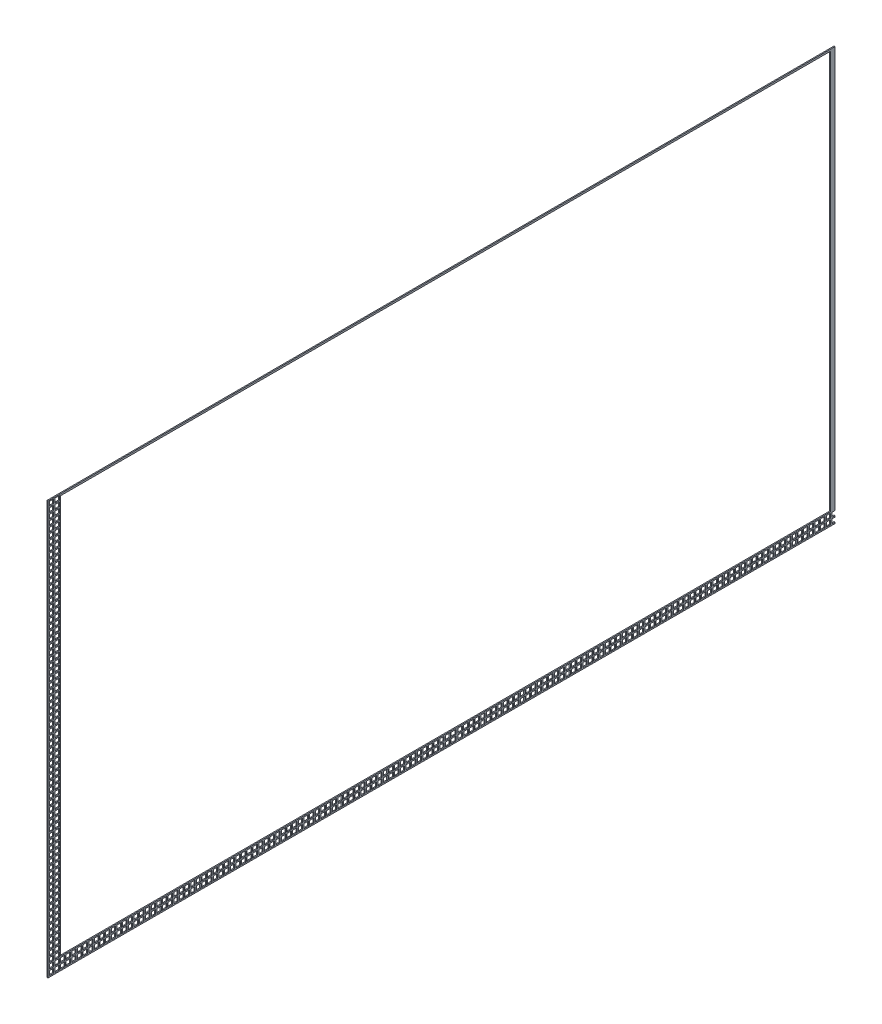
SolidWorks part; units mm, degrees
ref_plane "Front" through (0, 0, 0) normal (0, 0, 1) x (1, 0, 0)
ref_plane "Top" through (0, 0, 0) normal (0, 1, 0) x (1, 0, 0)
ref_plane "Right" through (0, 0, 0) normal (1, 0, 0) x (0, 0, -1)
sketch "Sketch1" plane through (0, 0, 0) normal (1, 0, 0) x (0, 0, -1)
  line L0 (1.651, 1.651) -> (1.651, 0) construction
  line L1 (0, 0) -> (1005.3049, 0)
  line L2 (0, 0) -> (0, 508)
  line L3 (1.651, 1.651) -> (0, 1.651) construction
  line L4 (130.7595, 1.651) -> (130.7595, 7.239)
  line L5 (130.7595, 8.89) -> (130.7595, 14.478)
  line L6 (1.651, 8.89) -> (7.239, 8.89)
  line L7 (1.651, 14.478) -> (7.239, 14.478)
  line L8 (124.714, 8.89) -> (130.7595, 8.89)
  line L9 (124.714, 14.478) -> (130.7595, 14.478)
  line L10 (124.714, 14.478) -> (124.714, 8.89)
  line L11 (123.063, 14.478) -> (123.063, 8.89)
  line L12 (117.475, 8.89) -> (123.063, 8.89)
  line L13 (117.475, 14.478) -> (123.063, 14.478)
  line L14 (117.475, 14.478) -> (117.475, 8.89)
  line L15 (115.824, 14.478) -> (115.824, 8.89)
  line L16 (110.236, 14.478) -> (115.824, 14.478)
  line L17 (110.236, 14.478) -> (110.236, 8.89)
  line L18 (108.585, 14.478) -> (108.585, 8.89)
  line L19 (110.236, 8.89) -> (115.824, 8.89)
  line L20 (95.758, 8.89) -> (101.346, 8.89)
  line L21 (102.997, 8.89) -> (108.585, 8.89)
  line L22 (88.519, 8.89) -> (94.107, 8.89)
  line L23 (81.28, 8.89) -> (86.868, 8.89)
  line L24 (74.041, 8.89) -> (79.629, 8.89)
  line L25 (66.802, 8.89) -> (72.39, 8.89)
  line L26 (59.563, 8.89) -> (65.151, 8.89)
  line L27 (45.085, 8.89) -> (50.673, 8.89)
  line L28 (52.324, 8.89) -> (57.912, 8.89)
  line L29 (74.041, 14.478) -> (79.629, 14.478)
  line L30 (81.28, 14.478) -> (86.868, 14.478)
  line L31 (88.519, 14.478) -> (94.107, 14.478)
  line L32 (95.758, 14.478) -> (101.346, 14.478)
  line L33 (102.997, 14.478) -> (102.997, 8.89)
  line L34 (81.28, 14.478) -> (81.28, 8.89)
  line L35 (79.629, 14.478) -> (79.629, 8.89)
  line L36 (86.868, 14.478) -> (86.868, 8.89)
  line L37 (101.346, 14.478) -> (101.346, 8.89)
  line L38 (95.758, 14.478) -> (95.758, 8.89)
  line L39 (94.107, 14.478) -> (94.107, 8.89)
  line L40 (1.651, 1.651) -> (7.239, 1.651)
  line L41 (1.651, 7.239) -> (7.239, 7.239)
  line L42 (88.519, 14.478) -> (88.519, 8.89)
  line L43 (124.714, 1.651) -> (130.7595, 1.651)
  line L44 (124.714, 7.239) -> (130.7595, 7.239)
  line L45 (72.39, 14.478) -> (72.39, 8.89)
  line L46 (124.714, 7.239) -> (124.714, 1.651)
  line L47 (123.063, 7.239) -> (123.063, 1.651)
  line L48 (117.475, 1.651) -> (123.063, 1.651)
  line L49 (117.475, 7.239) -> (123.063, 7.239)
  line L50 (74.041, 14.478) -> (74.041, 8.89)
  line L51 (117.475, 7.239) -> (117.475, 1.651)
  line L52 (115.824, 7.239) -> (115.824, 1.651)
  line L53 (110.236, 7.239) -> (115.824, 7.239)
  line L54 (110.236, 7.239) -> (110.236, 1.651)
  line L55 (66.802, 14.478) -> (66.802, 8.89)
  line L56 (108.585, 7.239) -> (108.585, 1.651)
  line L57 (110.236, 1.651) -> (115.824, 1.651)
  line L58 (95.758, 1.651) -> (101.346, 1.651)
  line L59 (102.997, 1.651) -> (108.585, 1.651)
  line L60 (88.519, 1.651) -> (94.107, 1.651)
  line L61 (81.28, 1.651) -> (86.868, 1.651)
  line L62 (74.041, 1.651) -> (79.629, 1.651)
  line L63 (66.802, 1.651) -> (72.39, 1.651)
  line L64 (59.563, 1.651) -> (65.151, 1.651)
  line L65 (45.085, 1.651) -> (50.673, 1.651)
  line L66 (52.324, 1.651) -> (57.912, 1.651)
  line L67 (74.041, 7.239) -> (79.629, 7.239)
  line L68 (81.28, 7.239) -> (86.868, 7.239)
  line L69 (88.519, 7.239) -> (94.107, 7.239)
  line L70 (95.758, 7.239) -> (101.346, 7.239)
  line L71 (65.151, 14.478) -> (65.151, 8.89)
  line L72 (102.997, 7.239) -> (102.997, 1.651)
  line L73 (81.28, 7.239) -> (81.28, 1.651)
  line L74 (79.629, 7.239) -> (79.629, 1.651)
  line L75 (86.868, 7.239) -> (86.868, 1.651)
  line L76 (101.346, 7.239) -> (101.346, 1.651)
  line L77 (66.802, 14.478) -> (72.39, 14.478)
  line L78 (95.758, 7.239) -> (95.758, 1.651)
  line L79 (59.563, 14.478) -> (65.151, 14.478)
  line L80 (94.107, 7.239) -> (94.107, 1.651)
  line L81 (59.563, 14.478) -> (59.563, 8.89)
  line L82 (88.519, 7.239) -> (88.519, 1.651)
  line L83 (57.912, 14.478) -> (57.912, 8.89)
  line L84 (72.39, 7.239) -> (72.39, 1.651)
  line L85 (74.041, 7.239) -> (74.041, 1.651)
  line L86 (66.802, 7.239) -> (66.802, 1.651)
  line L87 (65.151, 7.239) -> (65.151, 1.651)
  line L88 (52.324, 14.478) -> (52.324, 8.89)
  line L89 (66.802, 7.239) -> (72.39, 7.239)
  line L90 (59.563, 7.239) -> (65.151, 7.239)
  line L91 (59.563, 7.239) -> (59.563, 1.651)
  line L92 (50.673, 14.478) -> (50.673, 8.89)
  line L93 (57.912, 7.239) -> (57.912, 1.651)
  line L94 (52.324, 7.239) -> (52.324, 1.651)
  line L95 (52.324, 14.478) -> (57.912, 14.478)
  line L96 (50.673, 7.239) -> (50.673, 1.651)
  line L97 (52.324, 7.239) -> (57.912, 7.239)
  line L98 (45.085, 7.239) -> (45.085, 1.651)
  line L99 (43.434, 7.239) -> (43.434, 1.651)
  line L100 (45.085, 14.478) -> (45.085, 8.89)
  line L101 (45.085, 7.239) -> (50.673, 7.239)
  line L102 (37.846, 7.239) -> (43.434, 7.239)
  line L103 (43.434, 14.478) -> (43.434, 8.89)
  line L104 (37.846, 7.239) -> (37.846, 1.651)
  line L105 (36.195, 7.239) -> (36.195, 1.651)
  line L106 (45.085, 14.478) -> (50.673, 14.478)
  line L107 (30.607, 7.239) -> (30.607, 1.651)
  line L108 (30.607, 7.239) -> (36.195, 7.239)
  line L109 (28.956, 7.239) -> (28.956, 1.651)
  line L110 (23.368, 7.239) -> (23.368, 1.651)
  line L111 (37.846, 14.478) -> (43.434, 14.478)
  line L112 (21.717, 7.239) -> (21.717, 1.651)
  line L113 (23.368, 7.239) -> (28.956, 7.239)
  line L114 (37.846, 1.651) -> (43.434, 1.651)
  line L115 (30.607, 1.651) -> (36.195, 1.651)
  line L116 (23.368, 1.651) -> (28.956, 1.651)
  line L117 (16.129, 1.651) -> (21.717, 1.651)
  line L118 (16.129, 7.239) -> (16.129, 1.651)
  line L119 (37.846, 14.478) -> (37.846, 8.89)
  line L120 (14.478, 7.239) -> (14.478, 1.651)
  line L121 (16.129, 7.239) -> (21.717, 7.239)
  line L122 (8.89, 1.651) -> (14.478, 1.651)
  line L123 (8.89, 7.239) -> (14.478, 7.239)
  line L124 (8.89, 7.239) -> (8.89, 1.651)
  line L125 (36.195, 14.478) -> (36.195, 8.89)
  line L126 (7.239, 7.239) -> (7.239, 1.651)
  line L127 (1.651, 7.239) -> (1.651, 1.651)
  line L128 (102.997, 7.239) -> (108.585, 7.239)
  line L129 (30.607, 14.478) -> (30.607, 8.89)
  line L130 (30.607, 14.478) -> (36.195, 14.478)
  line L131 (28.956, 14.478) -> (28.956, 8.89)
  line L132 (23.368, 14.478) -> (23.368, 8.89)
  line L133 (21.717, 14.478) -> (21.717, 8.89)
  line L134 (23.368, 14.478) -> (28.956, 14.478)
  line L135 (37.846, 8.89) -> (43.434, 8.89)
  line L136 (30.607, 8.89) -> (36.195, 8.89)
  line L137 (23.368, 8.89) -> (28.956, 8.89)
  line L138 (16.129, 8.89) -> (21.717, 8.89)
  line L139 (16.129, 14.478) -> (16.129, 8.89)
  line L140 (14.478, 14.478) -> (14.478, 8.89)
  line L141 (16.129, 14.478) -> (21.717, 14.478)
  line L142 (8.89, 8.89) -> (14.478, 8.89)
  line L143 (8.89, 14.478) -> (14.478, 14.478)
  line L144 (8.89, 14.478) -> (8.89, 8.89)
  line L145 (7.239, 14.478) -> (7.239, 8.89)
  line L146 (1.651, 14.478) -> (1.651, 8.89)
  line L147 (102.997, 14.478) -> (108.585, 14.478)
  line L148 (1.651, 506.73) -> (7.239, 506.73)
  line L149 (515.8474, 11.684) -> (516.9926, 11.684) construction
  line L150 (1.651, 23.368) -> (7.239, 23.368)
  line L151 (1.651, 28.956) -> (7.239, 28.956)
  line L152 (520.0153, 8.89) -> (520.0153, 7.239) construction
  line L153 (974.6979, 1.651) -> (969.1099, 1.651)
  line L154 (524.3694, 11.684) -> (524.3694, -5.9901) construction
  line L155 (1.651, 117.475) -> (0, 117.475) construction
  line L156 (1.651, 124.714) -> (7.239, 124.714)
  line L157 (1.651, 130.302) -> (7.239, 130.302)
  line L158 (1.651, 117.475) -> (7.239, 117.475)
  line L159 (1.651, 123.063) -> (7.239, 123.063)
  line L160 (8.89, 506.73) -> (14.478, 506.73)
  line L161 (1009.269, 508) -> (1009.269, 529.7678)
  line L162 (1005.3049, 0) -> (1009.269, 0)
  line L163 (14.478, 123.063) -> (14.478, 117.475)
  line L164 (1009.269, 8.89) -> (1009.269, 7.239)
  line L165 (8.89, 117.475) -> (14.478, 117.475)
  line L166 (8.89, 123.063) -> (14.478, 123.063)
  line L167 (8.89, 123.063) -> (8.89, 117.475)
  line L168 (7.239, 123.063) -> (7.239, 117.475)
  line L169 (1.651, 123.063) -> (1.651, 117.475)
  line L171 (16.129, 527.4722) -> (1003.6539, 527.4722)
  line L172 (16.129, 527.4722) -> (16.129, 16.129)
  line L173 (14.478, 130.302) -> (14.478, 124.714)
  line L174 (16.129, 16.129) -> (1003.6539, 16.129)
  line L175 (8.89, 124.714) -> (14.478, 124.714)
  line L176 (8.89, 130.302) -> (14.478, 130.302)
  line L177 (8.89, 130.302) -> (8.89, 124.714)
  line L178 (7.239, 130.302) -> (7.239, 124.714)
  line L179 (1.651, 130.302) -> (1.651, 124.714)
  line L180 (1.651, 139.192) -> (7.239, 139.192)
  line L181 (1.651, 144.78) -> (7.239, 144.78)
  line L182 (1.651, 131.953) -> (7.239, 131.953)
  line L183 (1.651, 137.541) -> (7.239, 137.541)
  line L184 (1.651, 16.129) -> (7.239, 16.129)
  line L185 (1.651, 21.717) -> (7.239, 21.717)
  line L186 (1003.6539, 527.4722) -> (1003.6539, 16.129)
  line L187 (0, 529.7678) -> (1009.269, 529.7678)
  line L188 (1009.269, 1.651) -> (1009.269, 0)
  line L190 (1009.269, 508) -> (1009.269, 14.478)
  line L191 (1009.269, 14.478) -> (1005.3049, 14.478)
  line L192 (1009.269, 7.239) -> (1005.3049, 7.239)
  line L194 (1.651, 508.381) -> (7.239, 508.381)
  line L195 (1.651, 513.969) -> (7.239, 513.969)
  line L196 (14.478, 513.969) -> (14.478, 508.381)
  line L197 (1005.3049, 14.478) -> (1005.3049, 8.89)
  line L198 (1009.269, 1.651) -> (1005.3049, 1.651)
  line L199 (14.478, 137.541) -> (14.478, 131.953)
  line L200 (1009.269, 8.89) -> (1005.3049, 8.89)
  line L201 (8.89, 508.381) -> (14.478, 508.381)
  line L202 (8.89, 513.969) -> (14.478, 513.969)
  line L203 (8.89, 513.969) -> (8.89, 508.381)
  line L204 (7.239, 513.969) -> (7.239, 508.381)
  line L205 (1.651, 513.969) -> (1.651, 508.381)
  line L206 (1.651, 522.859) -> (7.239, 522.859)
  line L207 (1.651, 528.447) -> (7.239, 528.447)
  line L208 (1.651, 515.62) -> (7.239, 515.62)
  line L209 (1.651, 521.208) -> (7.239, 521.208)
  line L210 (14.478, 521.208) -> (14.478, 515.62)
  line L211 (8.89, 515.62) -> (14.478, 515.62)
  line L212 (8.89, 521.208) -> (14.478, 521.208)
  line L213 (8.89, 521.208) -> (8.89, 515.62)
  line L214 (7.239, 521.208) -> (7.239, 515.62)
  line L215 (1.651, 521.208) -> (1.651, 515.62)
  line L216 (14.478, 528.447) -> (14.478, 522.859)
  line L217 (8.89, 522.859) -> (14.478, 522.859)
  line L218 (8.89, 528.447) -> (14.478, 528.447)
  line L219 (8.89, 528.447) -> (8.89, 522.859)
  line L220 (7.239, 528.447) -> (7.239, 522.859)
  line L221 (8.89, 131.953) -> (14.478, 131.953)
  line L222 (1.651, 528.447) -> (1.651, 522.859)
  line L223 (8.89, 137.541) -> (14.478, 137.541)
  line L225 (8.89, 137.541) -> (8.89, 131.953)
  line L227 (7.239, 137.541) -> (7.239, 131.953)
  line L232 (1.651, 137.541) -> (1.651, 131.953)
  line L247 (14.478, 144.78) -> (14.478, 139.192)
  line L255 (8.89, 139.192) -> (14.478, 139.192)
  line L263 (8.89, 144.78) -> (14.478, 144.78)
  line L264 (14.478, 21.717) -> (14.478, 16.129)
  line L266 (8.89, 16.129) -> (14.478, 16.129)
  line L267 (8.89, 21.717) -> (14.478, 21.717)
  line L268 (8.89, 21.717) -> (8.89, 16.129)
  line L269 (8.89, 144.78) -> (8.89, 139.192)
  line L270 (7.239, 21.717) -> (7.239, 16.129)
  line L271 (1.651, 21.717) -> (1.651, 16.129)
  line L273 (7.239, 144.78) -> (7.239, 139.192)
  line L274 (1.651, 144.78) -> (1.651, 139.192)
  line L275 (1.651, 153.67) -> (7.239, 153.67)
  line L276 (1.651, 159.258) -> (7.239, 159.258)
  line L278 (1.651, 146.431) -> (7.239, 146.431)
  line L279 (1.651, 152.019) -> (7.239, 152.019)
  line L284 (14.478, 28.956) -> (14.478, 23.368)
  line L286 (8.89, 23.368) -> (14.478, 23.368)
  line L287 (8.89, 28.956) -> (14.478, 28.956)
  line L288 (8.89, 28.956) -> (8.89, 23.368)
  line L289 (7.239, 28.956) -> (7.239, 23.368)
  line L290 (1.651, 28.956) -> (1.651, 23.368)
  line L292 (14.478, 152.019) -> (14.478, 146.431)
  line L294 (1.651, 37.846) -> (7.239, 37.846)
  line L295 (1.651, 43.434) -> (7.239, 43.434)
  line L296 (8.89, 146.431) -> (14.478, 146.431)
  line L297 (8.89, 152.019) -> (14.478, 152.019)
  line L298 (8.89, 152.019) -> (8.89, 146.431)
  line L299 (7.239, 152.019) -> (7.239, 146.431)
  line L300 (1.651, 152.019) -> (1.651, 146.431)
  line L303 (0, 508) -> (0, 529.7678)
  line L304 (14.478, 159.258) -> (14.478, 153.67)
  line L306 (8.89, 153.67) -> (14.478, 153.67)
  line L307 (8.89, 159.258) -> (14.478, 159.258)
  line L308 (8.89, 159.258) -> (8.89, 153.67)
  line L309 (7.239, 159.258) -> (7.239, 153.67)
  line L310 (1.651, 159.258) -> (1.651, 153.67)
  line L311 (1.651, 168.148) -> (7.239, 168.148)
  line L312 (1.651, 173.736) -> (7.239, 173.736)
  line L313 (1.651, 160.909) -> (7.239, 160.909)
  line L314 (1.651, 166.497) -> (7.239, 166.497)
  line L318 (14.478, 166.497) -> (14.478, 160.909)
  line L320 (8.89, 160.909) -> (14.478, 160.909)
  line L321 (8.89, 166.497) -> (14.478, 166.497)
  line L322 (8.89, 166.497) -> (8.89, 160.909)
  line L323 (7.239, 166.497) -> (7.239, 160.909)
  line L324 (1.651, 166.497) -> (1.651, 160.909)
  line L328 (1.651, 30.607) -> (7.239, 30.607)
  line L329 (1.651, 36.195) -> (7.239, 36.195)
  line L330 (14.478, 173.736) -> (14.478, 168.148)
  line L332 (8.89, 168.148) -> (14.478, 168.148)
  line L333 (8.89, 173.736) -> (14.478, 173.736)
  line L334 (8.89, 173.736) -> (8.89, 168.148)
  line L335 (7.239, 173.736) -> (7.239, 168.148)
  line L336 (1.651, 173.736) -> (1.651, 168.148)
  line L337 (1.651, 182.626) -> (7.239, 182.626)
  line L338 (1.651, 188.214) -> (7.239, 188.214)
  line L339 (1.651, 175.387) -> (7.239, 175.387)
  line L340 (1.651, 180.975) -> (7.239, 180.975)
  line L344 (14.478, 180.975) -> (14.478, 175.387)
  line L346 (8.89, 175.387) -> (14.478, 175.387)
  line L347 (8.89, 180.975) -> (14.478, 180.975)
  line L348 (8.89, 180.975) -> (8.89, 175.387)
  line L349 (7.239, 180.975) -> (7.239, 175.387)
  line L350 (1.651, 180.975) -> (1.651, 175.387)
  line L354 (14.478, 188.214) -> (14.478, 182.626)
  line L356 (8.89, 182.626) -> (14.478, 182.626)
  line L357 (8.89, 188.214) -> (14.478, 188.214)
  line L358 (8.89, 188.214) -> (8.89, 182.626)
  line L359 (7.239, 188.214) -> (7.239, 182.626)
  line L360 (1.651, 188.214) -> (1.651, 182.626)
  line L361 (1.651, 197.104) -> (7.239, 197.104)
  line L362 (1.651, 202.692) -> (7.239, 202.692)
  line L363 (1.651, 189.865) -> (7.239, 189.865)
  line L364 (1.651, 195.453) -> (7.239, 195.453)
  line L368 (14.478, 195.453) -> (14.478, 189.865)
  line L370 (8.89, 189.865) -> (14.478, 189.865)
  line L371 (8.89, 195.453) -> (14.478, 195.453)
  line L372 (8.89, 195.453) -> (8.89, 189.865)
  line L373 (7.239, 195.453) -> (7.239, 189.865)
  line L374 (1.651, 195.453) -> (1.651, 189.865)
  line L378 (14.478, 202.692) -> (14.478, 197.104)
  line L380 (8.89, 197.104) -> (14.478, 197.104)
  line L381 (8.89, 202.692) -> (14.478, 202.692)
  line L382 (8.89, 202.692) -> (8.89, 197.104)
  line L383 (7.239, 202.692) -> (7.239, 197.104)
  line L384 (1.651, 202.692) -> (1.651, 197.104)
  line L385 (1.651, 211.582) -> (7.239, 211.582)
  line L386 (1.651, 217.17) -> (7.239, 217.17)
  line L387 (1.651, 204.343) -> (7.239, 204.343)
  line L388 (1.651, 209.931) -> (7.239, 209.931)
  line L392 (14.478, 209.931) -> (14.478, 204.343)
  line L394 (8.89, 204.343) -> (14.478, 204.343)
  line L395 (8.89, 209.931) -> (14.478, 209.931)
  line L396 (8.89, 209.931) -> (8.89, 204.343)
  line L397 (7.239, 209.931) -> (7.239, 204.343)
  line L398 (1.651, 209.931) -> (1.651, 204.343)
  line L403 (14.478, 217.17) -> (14.478, 211.582)
  line L407 (8.89, 211.582) -> (14.478, 211.582)
  line L408 (14.478, 36.195) -> (14.478, 30.607)
  line L410 (8.89, 30.607) -> (14.478, 30.607)
  line L411 (8.89, 36.195) -> (14.478, 36.195)
  line L412 (8.89, 36.195) -> (8.89, 30.607)
  line L413 (8.89, 217.17) -> (14.478, 217.17)
  line L414 (7.239, 36.195) -> (7.239, 30.607)
  line L415 (1.651, 36.195) -> (1.651, 30.607)
  line L416 (8.89, 217.17) -> (8.89, 211.582)
  line L417 (7.239, 217.17) -> (7.239, 211.582)
  line L418 (1.651, 217.17) -> (1.651, 211.582)
  line L419 (1.651, 226.06) -> (7.239, 226.06)
  line L420 (1.651, 231.648) -> (7.239, 231.648)
  line L422 (1.651, 218.821) -> (7.239, 218.821)
  line L423 (1.651, 224.409) -> (7.239, 224.409)
  line L428 (14.478, 43.434) -> (14.478, 37.846)
  line L430 (8.89, 37.846) -> (14.478, 37.846)
  line L431 (8.89, 43.434) -> (14.478, 43.434)
  line L432 (8.89, 43.434) -> (8.89, 37.846)
  line L433 (7.239, 43.434) -> (7.239, 37.846)
  line L434 (1.651, 43.434) -> (1.651, 37.846)
  line L436 (14.478, 224.409) -> (14.478, 218.821)
  line L438 (1.651, 52.324) -> (7.239, 52.324)
  line L439 (1.651, 57.912) -> (7.239, 57.912)
  line L440 (8.89, 218.821) -> (14.478, 218.821)
  line L462 (8.89, 224.409) -> (14.478, 224.409)
  line L463 (8.89, 224.409) -> (8.89, 218.821)
  line L464 (7.239, 224.409) -> (7.239, 218.821)
  line L465 (1.651, 224.409) -> (1.651, 218.821)
  line L469 (14.478, 231.648) -> (14.478, 226.06)
  line L471 (8.89, 226.06) -> (14.478, 226.06)
  line L472 (1.651, 45.085) -> (7.239, 45.085)
  line L473 (1.651, 50.673) -> (7.239, 50.673)
  line L474 (8.89, 231.648) -> (14.478, 231.648)
  line L475 (8.89, 231.648) -> (8.89, 226.06)
  line L476 (7.239, 231.648) -> (7.239, 226.06)
  line L477 (1.651, 231.648) -> (1.651, 226.06)
  line L478 (1.651, 233.299) -> (1.651, 231.648) construction
  line L479 (1.651, 233.299) -> (0, 233.299) construction
  line L480 (1.651, 240.538) -> (7.239, 240.538)
  line L481 (1.651, 246.126) -> (7.239, 246.126)
  line L482 (1.651, 233.299) -> (7.239, 233.299)
  line L483 (1.651, 238.887) -> (7.239, 238.887)
  line L487 (14.478, 238.887) -> (14.478, 233.299)
  line L489 (8.89, 233.299) -> (14.478, 233.299)
  line L490 (8.89, 238.887) -> (14.478, 238.887)
  line L491 (8.89, 238.887) -> (8.89, 233.299)
  line L492 (7.239, 238.887) -> (7.239, 233.299)
  line L493 (1.651, 238.887) -> (1.651, 233.299)
  line L497 (14.478, 246.126) -> (14.478, 240.538)
  line L499 (8.89, 240.538) -> (14.478, 240.538)
  line L500 (8.89, 246.126) -> (14.478, 246.126)
  line L501 (8.89, 246.126) -> (8.89, 240.538)
  line L502 (7.239, 246.126) -> (7.239, 240.538)
  line L503 (1.651, 246.126) -> (1.651, 240.538)
  line L504 (1.651, 255.016) -> (7.239, 255.016)
  line L505 (1003.6539, 14.478) -> (998.0659, 14.478)
  line L506 (1.651, 260.604) -> (7.239, 260.604)
  line L507 (1.651, 349.123) -> (0, 349.123) construction
  line L509 (1.651, 356.362) -> (7.239, 356.362)
  line L510 (1003.6539, 7.239) -> (998.0659, 7.239)
  line L511 (1003.6539, 14.478) -> (1003.6539, 8.89)
  line L512 (1005.3049, 7.239) -> (1005.3049, 1.651)
  line L513 (1003.6539, 7.239) -> (1003.6539, 1.651)
  line L514 (996.4149, 7.239) -> (990.8269, 7.239)
  line L515 (998.0659, 7.239) -> (998.0659, 1.651)
  line L516 (996.4149, 14.478) -> (990.8269, 14.478)
  line L517 (996.4149, 7.239) -> (996.4149, 1.651)
  line L518 (990.8269, 7.239) -> (990.8269, 1.651)
  line L519 (998.0659, 14.478) -> (998.0659, 8.89)
  line L520 (989.1759, 7.239) -> (989.1759, 1.651)
  line L521 (989.1759, 7.239) -> (983.5879, 7.239)
  line L522 (981.9369, 7.239) -> (976.3489, 7.239)
  line L523 (996.4149, 14.478) -> (996.4149, 8.89)
  line L524 (983.5879, 7.239) -> (983.5879, 1.651)
  line L525 (981.9369, 7.239) -> (981.9369, 1.651)
  line L526 (974.6979, 7.239) -> (974.6979, 1.651)
  line L527 (976.3489, 7.239) -> (976.3489, 1.651)
  line L528 (990.8269, 14.478) -> (990.8269, 8.89)
  line L529 (989.1759, 14.478) -> (989.1759, 8.89)
  line L530 (989.1759, 14.478) -> (983.5879, 14.478)
  line L531 (981.9369, 14.478) -> (976.3489, 14.478)
  line L532 (969.1099, 7.239) -> (969.1099, 1.651)
  line L533 (983.5879, 14.478) -> (983.5879, 8.89)
  line L534 (974.6979, 7.239) -> (969.1099, 7.239)
  line L535 (996.4149, 1.651) -> (990.8269, 1.651)
  line L536 (1003.6539, 1.651) -> (998.0659, 1.651)
  line L537 (989.1759, 1.651) -> (983.5879, 1.651)
  line L538 (981.9369, 1.651) -> (976.3489, 1.651)
  line L539 (981.9369, 14.478) -> (981.9369, 8.89)
  line L540 (974.6979, 14.478) -> (974.6979, 8.89)
  line L541 (976.3489, 14.478) -> (976.3489, 8.89)
  line L542 (1.651, 361.95) -> (7.239, 361.95)
  line L543 (1.651, 349.123) -> (7.239, 349.123)
  line L545 (969.1099, 14.478) -> (969.1099, 8.89)
  line L546 (974.6979, 14.478) -> (969.1099, 14.478)
  line L547 (996.4149, 8.89) -> (990.8269, 8.89)
  line L548 (1003.6539, 8.89) -> (998.0659, 8.89)
  line L551 (989.1759, 8.89) -> (983.5879, 8.89)
  line L552 (14.478, 50.673) -> (14.478, 45.085)
  line L554 (8.89, 45.085) -> (14.478, 45.085)
  line L555 (8.89, 50.673) -> (14.478, 50.673)
  line L556 (8.89, 50.673) -> (8.89, 45.085)
  line L557 (981.9369, 8.89) -> (976.3489, 8.89)
  line L558 (7.239, 50.673) -> (7.239, 45.085)
  line L559 (1.651, 50.673) -> (1.651, 45.085)
  line L560 (974.6979, 8.89) -> (969.1099, 8.89)
  line L561 (1.651, 354.711) -> (7.239, 354.711)
  line L563 (916.3284, 1.651) -> (917.9794, 1.651) construction
  line L572 (14.478, 57.912) -> (14.478, 52.324)
  line L574 (8.89, 52.324) -> (14.478, 52.324)
  line L575 (8.89, 57.912) -> (14.478, 57.912)
  line L576 (8.89, 57.912) -> (8.89, 52.324)
  line L577 (7.239, 57.912) -> (7.239, 52.324)
  line L578 (1.651, 57.912) -> (1.651, 52.324)
  line L582 (1.651, 66.802) -> (7.239, 66.802)
  line L583 (1.651, 72.39) -> (7.239, 72.39)
  line L616 (1.651, 59.563) -> (7.239, 59.563)
  line L617 (1.651, 65.151) -> (7.239, 65.151)
  line L626 (916.3284, 14.478) -> (916.3284, 8.89)
  line L627 (910.7404, 14.478) -> (910.7404, 8.89)
  line L628 (909.0894, 14.478) -> (909.0894, 8.89)
  line L629 (909.0894, 14.478) -> (903.5014, 14.478)
  line L630 (909.0894, 8.89) -> (903.5014, 8.89)
  line L631 (901.8504, 14.478) -> (896.2624, 14.478)
  line L632 (903.5014, 14.478) -> (903.5014, 8.89)
  line L633 (901.8504, 14.478) -> (901.8504, 8.89)
  line L634 (901.8504, 8.89) -> (896.2624, 8.89)
  line L635 (894.6114, 8.89) -> (889.0234, 8.89)
  line L636 (887.3724, 8.89) -> (881.7844, 8.89)
  line L637 (880.1334, 8.89) -> (874.5454, 8.89)
  line L638 (894.6114, 14.478) -> (889.0234, 14.478)
  line L639 (896.2624, 14.478) -> (896.2624, 8.89)
  line L640 (894.6114, 14.478) -> (894.6114, 8.89)
  line L641 (889.0234, 14.478) -> (889.0234, 8.89)
  line L642 (887.3724, 14.478) -> (881.7844, 14.478)
  line L643 (887.3724, 14.478) -> (887.3724, 8.89)
  line L644 (916.3284, 7.239) -> (916.3284, 1.651)
  line L645 (910.7404, 7.239) -> (910.7404, 1.651)
  line L646 (881.7844, 14.478) -> (881.7844, 8.89)
  line L647 (909.0894, 7.239) -> (909.0894, 1.651)
  line L648 (909.0894, 7.239) -> (903.5014, 7.239)
  line L649 (909.0894, 1.651) -> (903.5014, 1.651)
  line L650 (901.8504, 7.239) -> (896.2624, 7.239)
  line L651 (903.5014, 7.239) -> (903.5014, 1.651)
  line L652 (880.1334, 14.478) -> (880.1334, 8.89)
  line L653 (901.8504, 7.239) -> (901.8504, 1.651)
  line L654 (901.8504, 1.651) -> (896.2624, 1.651)
  line L655 (894.6114, 1.651) -> (889.0234, 1.651)
  line L656 (887.3724, 1.651) -> (881.7844, 1.651)
  line L657 (880.1334, 1.651) -> (874.5454, 1.651)
  line L658 (894.6114, 7.239) -> (889.0234, 7.239)
  line L659 (896.2624, 7.239) -> (896.2624, 1.651)
  line L660 (880.1334, 14.478) -> (874.5454, 14.478)
  line L661 (894.6114, 7.239) -> (894.6114, 1.651)
  line L662 (889.0234, 7.239) -> (889.0234, 1.651)
  line L663 (887.3724, 7.239) -> (881.7844, 7.239)
  line L664 (887.3724, 7.239) -> (887.3724, 1.651)
  line L665 (872.8944, 14.478) -> (867.3064, 14.478)
  line L666 (881.7844, 7.239) -> (881.7844, 1.651)
  line L667 (880.1334, 7.239) -> (880.1334, 1.651)
  line L668 (874.5454, 14.478) -> (874.5454, 8.89)
  line L669 (880.1334, 7.239) -> (874.5454, 7.239)
  line L670 (872.8944, 7.239) -> (867.3064, 7.239)
  line L671 (872.8944, 14.478) -> (872.8944, 8.89)
  line L672 (874.5454, 7.239) -> (874.5454, 1.651)
  line L673 (872.8944, 7.239) -> (872.8944, 1.651)
  line L674 (865.6554, 7.239) -> (860.0674, 7.239)
  line L675 (867.3064, 7.239) -> (867.3064, 1.651)
  line L676 (865.6554, 14.478) -> (860.0674, 14.478)
  line L677 (865.6554, 7.239) -> (865.6554, 1.651)
  line L678 (860.0674, 7.239) -> (860.0674, 1.651)
  line L679 (867.3064, 14.478) -> (867.3064, 8.89)
  line L680 (858.4164, 7.239) -> (858.4164, 1.651)
  line L681 (858.4164, 7.239) -> (852.8284, 7.239)
  line L682 (851.1774, 7.239) -> (845.5894, 7.239)
  line L683 (865.6554, 14.478) -> (865.6554, 8.89)
  line L684 (852.8284, 7.239) -> (852.8284, 1.651)
  line L685 (851.1774, 7.239) -> (851.1774, 1.651)
  line L686 (843.9384, 7.239) -> (843.9384, 1.651)
  line L687 (845.5894, 7.239) -> (845.5894, 1.651)
  line L689 (860.0674, 14.478) -> (860.0674, 8.89)
  line L690 (858.4164, 14.478) -> (858.4164, 8.89)
  line L691 (858.4164, 14.478) -> (852.8284, 14.478)
  line L692 (851.1774, 14.478) -> (845.5894, 14.478)
  line L695 (831.1114, 7.239) -> (831.1114, 1.651)
  line L696 (14.478, 65.151) -> (14.478, 59.563)
  line L698 (8.89, 59.563) -> (14.478, 59.563)
  line L699 (8.89, 65.151) -> (14.478, 65.151)
  line L700 (8.89, 65.151) -> (8.89, 59.563)
  line L701 (838.3504, 7.239) -> (838.3504, 1.651)
  line L702 (7.239, 65.151) -> (7.239, 59.563)
  line L703 (1.651, 65.151) -> (1.651, 59.563)
  line L704 (836.6994, 7.239) -> (836.6994, 1.651)
  line L705 (852.8284, 14.478) -> (852.8284, 8.89)
  line L706 (836.6994, 7.239) -> (831.1114, 7.239)
  line L707 (843.9384, 7.239) -> (838.3504, 7.239)
  line L708 (865.6554, 1.651) -> (860.0674, 1.651)
  line L710 (872.8944, 1.651) -> (867.3064, 1.651)
  line L711 (858.4164, 1.651) -> (852.8284, 1.651)
  line L712 (851.1774, 1.651) -> (845.5894, 1.651)
  line L713 (843.9384, 1.651) -> (838.3504, 1.651)
  line L716 (14.478, 72.39) -> (14.478, 66.802)
  line L718 (8.89, 66.802) -> (14.478, 66.802)
  line L719 (8.89, 72.39) -> (14.478, 72.39)
  line L720 (8.89, 72.39) -> (8.89, 66.802)
  line L721 (7.239, 72.39) -> (7.239, 66.802)
  line L722 (1.651, 72.39) -> (1.651, 66.802)
  line L723 (836.6994, 1.651) -> (831.1114, 1.651)
  line L724 (851.1774, 14.478) -> (851.1774, 8.89)
  line L725 (843.9384, 14.478) -> (843.9384, 8.89)
  line L726 (1.651, 81.28) -> (7.239, 81.28)
  line L727 (1.651, 86.868) -> (7.239, 86.868)
  line L728 (845.5894, 14.478) -> (845.5894, 8.89)
  line L729 (916.3284, 7.239) -> (910.7404, 7.239)
  line L730 (916.3284, 1.651) -> (910.7404, 1.651)
  line L731 (831.1114, 14.478) -> (831.1114, 8.89)
  line L732 (838.3504, 14.478) -> (838.3504, 8.89)
  line L733 (836.6994, 14.478) -> (836.6994, 8.89)
  line L734 (836.6994, 14.478) -> (831.1114, 14.478)
  line L735 (843.9384, 14.478) -> (838.3504, 14.478)
  line L736 (865.6554, 8.89) -> (860.0674, 8.89)
  line L737 (872.8944, 8.89) -> (867.3064, 8.89)
  line L738 (858.4164, 8.89) -> (852.8284, 8.89)
  line L739 (851.1774, 8.89) -> (845.5894, 8.89)
  line L740 (843.9384, 8.89) -> (838.3504, 8.89)
  line L741 (836.6994, 8.89) -> (831.1114, 8.89)
  line L742 (916.3284, 14.478) -> (910.7404, 14.478)
  line L743 (916.3284, 8.89) -> (910.7404, 8.89)
  line L760 (1.651, 74.041) -> (7.239, 74.041)
  line L761 (1.651, 79.629) -> (7.239, 79.629)
  line L774 (945.7419, 14.478) -> (940.1539, 14.478)
  line L775 (945.7419, 7.239) -> (940.1539, 7.239)
  line L776 (960.2199, 7.239) -> (960.2199, 1.651)
  line L777 (954.6319, 7.239) -> (954.6319, 1.651)
  line L778 (952.9809, 7.239) -> (952.9809, 1.651)
  line L779 (947.3929, 7.239) -> (947.3929, 1.651)
  line L780 (961.8709, 7.239) -> (961.8709, 1.651)
  line L781 (967.4589, 7.239) -> (967.4589, 1.651)
  line L782 (945.7419, 7.239) -> (945.7419, 1.651)
  line L783 (952.9809, 7.239) -> (947.3929, 7.239)
  line L784 (960.2199, 7.239) -> (954.6319, 7.239)
  line L785 (967.4589, 7.239) -> (961.8709, 7.239)
  line L786 (967.4589, 1.651) -> (961.8709, 1.651)
  line L787 (960.2199, 1.651) -> (954.6319, 1.651)
  line L788 (945.7419, 1.651) -> (940.1539, 1.651)
  line L789 (952.9809, 1.651) -> (947.3929, 1.651)
  line L790 (938.5029, 1.651) -> (932.9149, 1.651)
  line L791 (940.1539, 7.239) -> (940.1539, 1.651)
  line L792 (938.5029, 7.239) -> (938.5029, 1.651)
  line L793 (938.5029, 7.239) -> (932.9149, 7.239)
  line L794 (932.9149, 7.239) -> (932.9149, 1.651)
  line L795 (931.2639, 7.239) -> (931.2639, 1.651)
  line L796 (931.2639, 7.239) -> (925.6759, 7.239)
  line L797 (931.2639, 1.651) -> (925.6759, 1.651)
  line L798 (925.6759, 7.239) -> (925.6759, 1.651)
  line L799 (924.0249, 7.239) -> (924.0249, 1.651)
  line L800 (924.0249, 7.239) -> (917.9794, 7.239)
  line L801 (924.0249, 1.651) -> (917.9794, 1.651)
  line L802 (960.2199, 14.478) -> (960.2199, 8.89)
  line L803 (954.6319, 14.478) -> (954.6319, 8.89)
  line L804 (952.9809, 14.478) -> (952.9809, 8.89)
  line L805 (947.3929, 14.478) -> (947.3929, 8.89)
  line L806 (961.8709, 14.478) -> (961.8709, 8.89)
  line L807 (967.4589, 14.478) -> (967.4589, 8.89)
  line L808 (945.7419, 14.478) -> (945.7419, 8.89)
  line L809 (952.9809, 14.478) -> (947.3929, 14.478)
  line L810 (960.2199, 14.478) -> (954.6319, 14.478)
  line L811 (967.4589, 14.478) -> (961.8709, 14.478)
  line L812 (967.4589, 8.89) -> (961.8709, 8.89)
  line L813 (960.2199, 8.89) -> (954.6319, 8.89)
  line L814 (945.7419, 8.89) -> (940.1539, 8.89)
  line L815 (952.9809, 8.89) -> (947.3929, 8.89)
  line L816 (938.5029, 8.89) -> (932.9149, 8.89)
  line L817 (940.1539, 14.478) -> (940.1539, 8.89)
  line L818 (938.5029, 14.478) -> (938.5029, 8.89)
  line L819 (938.5029, 14.478) -> (932.9149, 14.478)
  line L820 (932.9149, 14.478) -> (932.9149, 8.89)
  line L821 (931.2639, 14.478) -> (931.2639, 8.89)
  line L822 (931.2639, 14.478) -> (925.6759, 14.478)
  line L823 (931.2639, 8.89) -> (925.6759, 8.89)
  line L824 (925.6759, 14.478) -> (925.6759, 8.89)
  line L825 (924.0249, 14.478) -> (924.0249, 8.89)
  line L826 (924.0249, 14.478) -> (917.9794, 14.478)
  line L827 (924.0249, 8.89) -> (917.9794, 8.89)
  line L828 (917.9794, 8.89) -> (917.9794, 14.478)
  line L829 (917.9794, 1.651) -> (917.9794, 7.239)
  line L830 (785.5688, 1.651) -> (787.2198, 1.651) construction
  line L840 (14.478, 79.629) -> (14.478, 74.041)
  line L842 (8.89, 74.041) -> (14.478, 74.041)
  line L843 (8.89, 79.629) -> (14.478, 79.629)
  line L844 (8.89, 79.629) -> (8.89, 74.041)
  line L846 (7.239, 79.629) -> (7.239, 74.041)
  line L847 (1.651, 79.629) -> (1.651, 74.041)
  line L860 (14.478, 86.868) -> (14.478, 81.28)
  line L862 (8.89, 81.28) -> (14.478, 81.28)
  line L863 (8.89, 86.868) -> (14.478, 86.868)
  line L864 (8.89, 86.868) -> (8.89, 81.28)
  line L865 (7.239, 86.868) -> (7.239, 81.28)
  line L866 (1.651, 86.868) -> (1.651, 81.28)
  line L870 (1.651, 95.758) -> (7.239, 95.758)
  line L871 (1.651, 101.346) -> (7.239, 101.346)
  line L893 (785.5688, 14.478) -> (785.5688, 8.89)
  line L894 (779.9808, 14.478) -> (779.9808, 8.89)
  line L895 (778.3298, 14.478) -> (778.3298, 8.89)
  line L896 (778.3298, 14.478) -> (772.7418, 14.478)
  line L897 (778.3298, 8.89) -> (772.7418, 8.89)
  line L898 (771.0908, 14.478) -> (765.5028, 14.478)
  line L899 (772.7418, 14.478) -> (772.7418, 8.89)
  line L900 (771.0908, 14.478) -> (771.0908, 8.89)
  line L901 (771.0908, 8.89) -> (765.5028, 8.89)
  line L902 (763.8518, 8.89) -> (758.2638, 8.89)
  line L903 (756.6128, 8.89) -> (751.0248, 8.89)
  line L904 (1.651, 88.519) -> (7.239, 88.519)
  line L905 (1.651, 94.107) -> (7.239, 94.107)
  line L906 (749.3738, 8.89) -> (743.7858, 8.89)
  line L907 (763.8518, 14.478) -> (758.2638, 14.478)
  line L908 (765.5028, 14.478) -> (765.5028, 8.89)
  line L909 (763.8518, 14.478) -> (763.8518, 8.89)
  line L910 (758.2638, 14.478) -> (758.2638, 8.89)
  line L911 (756.6128, 14.478) -> (751.0248, 14.478)
  line L912 (756.6128, 14.478) -> (756.6128, 8.89)
  line L913 (785.5688, 7.239) -> (785.5688, 1.651)
  line L914 (779.9808, 7.239) -> (779.9808, 1.651)
  line L915 (751.0248, 14.478) -> (751.0248, 8.89)
  line L916 (778.3298, 7.239) -> (778.3298, 1.651)
  line L917 (778.3298, 7.239) -> (772.7418, 7.239)
  line L918 (778.3298, 1.651) -> (772.7418, 1.651)
  line L919 (771.0908, 7.239) -> (765.5028, 7.239)
  line L920 (772.7418, 7.239) -> (772.7418, 1.651)
  line L921 (749.3738, 14.478) -> (749.3738, 8.89)
  line L922 (771.0908, 7.239) -> (771.0908, 1.651)
  line L923 (771.0908, 1.651) -> (765.5028, 1.651)
  line L924 (763.8518, 1.651) -> (758.2638, 1.651)
  line L925 (756.6128, 1.651) -> (751.0248, 1.651)
  line L926 (749.3738, 1.651) -> (743.7858, 1.651)
  line L927 (763.8518, 7.239) -> (758.2638, 7.239)
  line L928 (765.5028, 7.239) -> (765.5028, 1.651)
  line L929 (749.3738, 14.478) -> (743.7858, 14.478)
  line L930 (763.8518, 7.239) -> (763.8518, 1.651)
  line L931 (758.2638, 7.239) -> (758.2638, 1.651)
  line L932 (756.6128, 7.239) -> (751.0248, 7.239)
  line L933 (756.6128, 7.239) -> (756.6128, 1.651)
  line L934 (742.1348, 14.478) -> (736.5468, 14.478)
  line L935 (751.0248, 7.239) -> (751.0248, 1.651)
  line L936 (749.3738, 7.239) -> (749.3738, 1.651)
  line L937 (743.7858, 14.478) -> (743.7858, 8.89)
  line L938 (749.3738, 7.239) -> (743.7858, 7.239)
  line L939 (742.1348, 7.239) -> (736.5468, 7.239)
  line L940 (742.1348, 14.478) -> (742.1348, 8.89)
  line L941 (743.7858, 7.239) -> (743.7858, 1.651)
  line L942 (742.1348, 7.239) -> (742.1348, 1.651)
  line L943 (734.8958, 7.239) -> (729.3078, 7.239)
  line L944 (736.5468, 7.239) -> (736.5468, 1.651)
  line L945 (734.8958, 14.478) -> (729.3078, 14.478)
  line L946 (734.8958, 7.239) -> (734.8958, 1.651)
  line L947 (729.3078, 7.239) -> (729.3078, 1.651)
  line L948 (736.5468, 14.478) -> (736.5468, 8.89)
  line L949 (727.6568, 7.239) -> (727.6568, 1.651)
  line L950 (727.6568, 7.239) -> (722.0688, 7.239)
  line L951 (720.4178, 7.239) -> (714.8298, 7.239)
  line L952 (734.8958, 14.478) -> (734.8958, 8.89)
  line L953 (722.0688, 7.239) -> (722.0688, 1.651)
  line L954 (720.4178, 7.239) -> (720.4178, 1.651)
  line L955 (714.8298, 7.239) -> (714.8298, 1.651)
  line L956 (729.3078, 14.478) -> (729.3078, 8.89)
  line L957 (727.6568, 14.478) -> (727.6568, 8.89)
  line L958 (727.6568, 14.478) -> (722.0688, 14.478)
  line L959 (720.4178, 14.478) -> (714.8298, 14.478)
  line L960 (722.0688, 14.478) -> (722.0688, 8.89)
  line L961 (734.8958, 1.651) -> (729.3078, 1.651)
  line L962 (742.1348, 1.651) -> (736.5468, 1.651)
  line L963 (727.6568, 1.651) -> (722.0688, 1.651)
  line L964 (720.4178, 1.651) -> (714.8298, 1.651)
  line L965 (720.4178, 14.478) -> (720.4178, 8.89)
  line L966 (714.8298, 14.478) -> (714.8298, 8.89)
  line L967 (785.5688, 7.239) -> (779.9808, 7.239)
  line L968 (785.5688, 1.651) -> (779.9808, 1.651)
  line L969 (734.8958, 8.89) -> (729.3078, 8.89)
  line L970 (742.1348, 8.89) -> (736.5468, 8.89)
  line L971 (727.6568, 8.89) -> (722.0688, 8.89)
  line L972 (720.4178, 8.89) -> (714.8298, 8.89)
  line L973 (785.5688, 14.478) -> (779.9808, 14.478)
  line L974 (785.5688, 8.89) -> (779.9808, 8.89)
  line L984 (14.478, 94.107) -> (14.478, 88.519)
  line L986 (8.89, 88.519) -> (14.478, 88.519)
  line L987 (8.89, 94.107) -> (14.478, 94.107)
  line L988 (8.89, 94.107) -> (8.89, 88.519)
  line L990 (7.239, 94.107) -> (7.239, 88.519)
  line L991 (1.651, 94.107) -> (1.651, 88.519)
  line L1004 (14.478, 101.346) -> (14.478, 95.758)
  line L1006 (8.89, 95.758) -> (14.478, 95.758)
  line L1007 (8.89, 101.346) -> (14.478, 101.346)
  line L1008 (8.89, 101.346) -> (8.89, 95.758)
  line L1009 (7.239, 101.346) -> (7.239, 95.758)
  line L1010 (1.651, 101.346) -> (1.651, 95.758)
  line L1014 (1.651, 110.236) -> (7.239, 110.236)
  line L1015 (1.651, 115.824) -> (7.239, 115.824)
  line L1021 (814.9824, 14.478) -> (809.3944, 14.478)
  line L1022 (814.9824, 7.239) -> (809.3944, 7.239)
  line L1023 (829.4604, 7.239) -> (829.4604, 1.651)
  line L1024 (823.8724, 7.239) -> (823.8724, 1.651)
  line L1025 (822.2214, 7.239) -> (822.2214, 1.651)
  line L1026 (816.6334, 7.239) -> (816.6334, 1.651)
  line L1027 (814.9824, 7.239) -> (814.9824, 1.651)
  line L1028 (822.2214, 7.239) -> (816.6334, 7.239)
  line L1029 (829.4604, 7.239) -> (823.8724, 7.239)
  line L1030 (829.4604, 1.651) -> (823.8724, 1.651)
  line L1031 (814.9824, 1.651) -> (809.3944, 1.651)
  line L1032 (822.2214, 1.651) -> (816.6334, 1.651)
  line L1033 (807.7434, 1.651) -> (802.1554, 1.651)
  line L1034 (809.3944, 7.239) -> (809.3944, 1.651)
  line L1035 (807.7434, 7.239) -> (807.7434, 1.651)
  line L1036 (807.7434, 7.239) -> (802.1554, 7.239)
  line L1037 (802.1554, 7.239) -> (802.1554, 1.651)
  line L1038 (800.5044, 7.239) -> (800.5044, 1.651)
  line L1039 (800.5044, 7.239) -> (794.9164, 7.239)
  line L1040 (800.5044, 1.651) -> (794.9164, 1.651)
  line L1041 (794.9164, 7.239) -> (794.9164, 1.651)
  line L1042 (793.2654, 7.239) -> (793.2654, 1.651)
  line L1043 (793.2654, 7.239) -> (787.2198, 7.239)
  line L1044 (793.2654, 1.651) -> (787.2198, 1.651)
  line L1045 (829.4604, 14.478) -> (829.4604, 8.89)
  line L1046 (823.8724, 14.478) -> (823.8724, 8.89)
  line L1047 (822.2214, 14.478) -> (822.2214, 8.89)
  line L1048 (1.651, 102.997) -> (7.239, 102.997)
  line L1049 (1.651, 108.585) -> (7.239, 108.585)
  line L1050 (816.6334, 14.478) -> (816.6334, 8.89)
  line L1051 (814.9824, 14.478) -> (814.9824, 8.89)
  line L1052 (822.2214, 14.478) -> (816.6334, 14.478)
  line L1053 (829.4604, 14.478) -> (823.8724, 14.478)
  line L1054 (829.4604, 8.89) -> (823.8724, 8.89)
  line L1055 (814.9824, 8.89) -> (809.3944, 8.89)
  line L1056 (822.2214, 8.89) -> (816.6334, 8.89)
  line L1057 (807.7434, 8.89) -> (802.1554, 8.89)
  line L1058 (809.3944, 14.478) -> (809.3944, 8.89)
  line L1059 (807.7434, 14.478) -> (807.7434, 8.89)
  line L1060 (807.7434, 14.478) -> (802.1554, 14.478)
  line L1061 (802.1554, 14.478) -> (802.1554, 8.89)
  line L1062 (800.5044, 14.478) -> (800.5044, 8.89)
  line L1063 (800.5044, 14.478) -> (794.9164, 14.478)
  line L1064 (800.5044, 8.89) -> (794.9164, 8.89)
  line L1065 (794.9164, 14.478) -> (794.9164, 8.89)
  line L1066 (793.2654, 14.478) -> (793.2654, 8.89)
  line L1067 (793.2654, 14.478) -> (787.2198, 14.478)
  line L1068 (793.2654, 8.89) -> (787.2198, 8.89)
  line L1069 (787.2198, 8.89) -> (787.2198, 14.478)
  line L1070 (787.2198, 1.651) -> (787.2198, 7.239)
  line L1071 (654.8093, 1.651) -> (656.4603, 1.651) construction
  line L1100 (654.8093, 14.478) -> (654.8093, 8.89)
  line L1101 (649.2213, 14.478) -> (649.2213, 8.89)
  line L1102 (647.5703, 14.478) -> (647.5703, 8.89)
  line L1103 (647.5703, 14.478) -> (641.9823, 14.478)
  line L1104 (647.5703, 8.89) -> (641.9823, 8.89)
  line L1105 (640.3313, 14.478) -> (634.7433, 14.478)
  line L1106 (641.9823, 14.478) -> (641.9823, 8.89)
  line L1107 (640.3313, 14.478) -> (640.3313, 8.89)
  line L1108 (640.3313, 8.89) -> (634.7433, 8.89)
  line L1109 (633.0923, 8.89) -> (627.5043, 8.89)
  line L1110 (625.8533, 8.89) -> (620.2653, 8.89)
  line L1111 (618.6143, 8.89) -> (613.0263, 8.89)
  line L1112 (633.0923, 14.478) -> (627.5043, 14.478)
  line L1113 (634.7433, 14.478) -> (634.7433, 8.89)
  line L1114 (633.0923, 14.478) -> (633.0923, 8.89)
  line L1115 (627.5043, 14.478) -> (627.5043, 8.89)
  line L1116 (625.8533, 14.478) -> (620.2653, 14.478)
  line L1117 (625.8533, 14.478) -> (625.8533, 8.89)
  line L1118 (654.8093, 7.239) -> (654.8093, 1.651)
  line L1119 (649.2213, 7.239) -> (649.2213, 1.651)
  line L1121 (620.2653, 14.478) -> (620.2653, 8.89)
  line L1122 (647.5703, 7.239) -> (647.5703, 1.651)
  line L1123 (647.5703, 7.239) -> (641.9823, 7.239)
  line L1124 (647.5703, 1.651) -> (641.9823, 1.651)
  line L1127 (640.3313, 7.239) -> (634.7433, 7.239)
  line L1128 (14.478, 108.585) -> (14.478, 102.997)
  line L1130 (8.89, 102.997) -> (14.478, 102.997)
  line L1131 (8.89, 108.585) -> (14.478, 108.585)
  line L1132 (8.89, 108.585) -> (8.89, 102.997)
  line L1133 (641.9823, 7.239) -> (641.9823, 1.651)
  line L1134 (7.239, 108.585) -> (7.239, 102.997)
  line L1135 (1.651, 108.585) -> (1.651, 102.997)
  line L1136 (618.6143, 14.478) -> (618.6143, 8.89)
  line L1137 (640.3313, 7.239) -> (640.3313, 1.651)
  line L1138 (640.3313, 1.651) -> (634.7433, 1.651)
  line L1139 (633.0923, 1.651) -> (627.5043, 1.651)
  line L1140 (625.8533, 1.651) -> (620.2653, 1.651)
  line L1142 (618.6143, 1.651) -> (613.0263, 1.651)
  line L1143 (633.0923, 7.239) -> (627.5043, 7.239)
  line L1144 (634.7433, 7.239) -> (634.7433, 1.651)
  line L1145 (618.6143, 14.478) -> (613.0263, 14.478)
  line L1148 (14.478, 115.824) -> (14.478, 110.236)
  line L1150 (8.89, 110.236) -> (14.478, 110.236)
  line L1151 (8.89, 115.824) -> (14.478, 115.824)
  line L1152 (8.89, 115.824) -> (8.89, 110.236)
  line L1153 (7.239, 115.824) -> (7.239, 110.236)
  line L1154 (1.651, 115.824) -> (1.651, 110.236)
  line L1155 (633.0923, 7.239) -> (633.0923, 1.651)
  line L1156 (132.4105, 1.651) -> (130.7595, 1.651) construction
  line L1157 (261.519, 1.651) -> (261.519, 7.239)
  line L1158 (261.519, 8.89) -> (261.519, 14.478)
  line L1159 (132.4105, 8.89) -> (137.9985, 8.89)
  line L1160 (132.4105, 14.478) -> (137.9985, 14.478)
  line L1161 (255.4735, 8.89) -> (261.519, 8.89)
  line L1162 (255.4735, 14.478) -> (261.519, 14.478)
  line L1163 (255.4735, 14.478) -> (255.4735, 8.89)
  line L1164 (253.8225, 14.478) -> (253.8225, 8.89)
  line L1165 (248.2345, 8.89) -> (253.8225, 8.89)
  line L1166 (248.2345, 14.478) -> (253.8225, 14.478)
  line L1167 (248.2345, 14.478) -> (248.2345, 8.89)
  line L1168 (246.5835, 14.478) -> (246.5835, 8.89)
  line L1169 (240.9955, 14.478) -> (246.5835, 14.478)
  line L1170 (240.9955, 14.478) -> (240.9955, 8.89)
  line L1171 (239.3445, 14.478) -> (239.3445, 8.89)
  line L1172 (240.9955, 8.89) -> (246.5835, 8.89)
  line L1173 (226.5175, 8.89) -> (232.1055, 8.89)
  line L1174 (233.7565, 8.89) -> (239.3445, 8.89)
  line L1175 (219.2785, 8.89) -> (224.8665, 8.89)
  line L1176 (212.0395, 8.89) -> (217.6275, 8.89)
  line L1177 (204.8005, 8.89) -> (210.3885, 8.89)
  line L1178 (197.5615, 8.89) -> (203.1495, 8.89)
  line L1179 (190.3225, 8.89) -> (195.9105, 8.89)
  line L1180 (175.8445, 8.89) -> (181.4325, 8.89)
  line L1181 (183.0835, 8.89) -> (188.6715, 8.89)
  line L1182 (204.8005, 14.478) -> (210.3885, 14.478)
  line L1183 (212.0395, 14.478) -> (217.6275, 14.478)
  line L1184 (219.2785, 14.478) -> (224.8665, 14.478)
  line L1185 (226.5175, 14.478) -> (232.1055, 14.478)
  line L1186 (233.7565, 14.478) -> (233.7565, 8.89)
  line L1187 (212.0395, 14.478) -> (212.0395, 8.89)
  line L1188 (210.3885, 14.478) -> (210.3885, 8.89)
  line L1189 (217.6275, 14.478) -> (217.6275, 8.89)
  line L1190 (232.1055, 14.478) -> (232.1055, 8.89)
  line L1191 (226.5175, 14.478) -> (226.5175, 8.89)
  line L1192 (224.8665, 14.478) -> (224.8665, 8.89)
  line L1193 (132.4105, 1.651) -> (137.9985, 1.651)
  line L1194 (132.4105, 7.239) -> (137.9985, 7.239)
  line L1195 (219.2785, 14.478) -> (219.2785, 8.89)
  line L1196 (255.4735, 1.651) -> (261.519, 1.651)
  line L1197 (255.4735, 7.239) -> (261.519, 7.239)
  line L1198 (203.1495, 14.478) -> (203.1495, 8.89)
  line L1199 (255.4735, 7.239) -> (255.4735, 1.651)
  line L1200 (253.8225, 7.239) -> (253.8225, 1.651)
  line L1201 (248.2345, 1.651) -> (253.8225, 1.651)
  line L1202 (248.2345, 7.239) -> (253.8225, 7.239)
  line L1203 (204.8005, 14.478) -> (204.8005, 8.89)
  line L1204 (248.2345, 7.239) -> (248.2345, 1.651)
  line L1205 (246.5835, 7.239) -> (246.5835, 1.651)
  line L1206 (240.9955, 7.239) -> (246.5835, 7.239)
  line L1207 (240.9955, 7.239) -> (240.9955, 1.651)
  line L1208 (197.5615, 14.478) -> (197.5615, 8.89)
  line L1209 (239.3445, 7.239) -> (239.3445, 1.651)
  line L1210 (240.9955, 1.651) -> (246.5835, 1.651)
  line L1211 (226.5175, 1.651) -> (232.1055, 1.651)
  line L1212 (233.7565, 1.651) -> (239.3445, 1.651)
  line L1213 (219.2785, 1.651) -> (224.8665, 1.651)
  line L1214 (212.0395, 1.651) -> (217.6275, 1.651)
  line L1215 (204.8005, 1.651) -> (210.3885, 1.651)
  line L1216 (197.5615, 1.651) -> (203.1495, 1.651)
  line L1217 (190.3225, 1.651) -> (195.9105, 1.651)
  line L1218 (175.8445, 1.651) -> (181.4325, 1.651)
  line L1219 (183.0835, 1.651) -> (188.6715, 1.651)
  line L1220 (204.8005, 7.239) -> (210.3885, 7.239)
  line L1221 (212.0395, 7.239) -> (217.6275, 7.239)
  line L1222 (219.2785, 7.239) -> (224.8665, 7.239)
  line L1223 (226.5175, 7.239) -> (232.1055, 7.239)
  line L1224 (195.9105, 14.478) -> (195.9105, 8.89)
  line L1225 (233.7565, 7.239) -> (233.7565, 1.651)
  line L1226 (212.0395, 7.239) -> (212.0395, 1.651)
  line L1227 (210.3885, 7.239) -> (210.3885, 1.651)
  line L1228 (217.6275, 7.239) -> (217.6275, 1.651)
  line L1229 (232.1055, 7.239) -> (232.1055, 1.651)
  line L1230 (197.5615, 14.478) -> (203.1495, 14.478)
  line L1231 (226.5175, 7.239) -> (226.5175, 1.651)
  line L1232 (190.3225, 14.478) -> (195.9105, 14.478)
  line L1233 (224.8665, 7.239) -> (224.8665, 1.651)
  line L1234 (190.3225, 14.478) -> (190.3225, 8.89)
  line L1235 (219.2785, 7.239) -> (219.2785, 1.651)
  line L1236 (188.6715, 14.478) -> (188.6715, 8.89)
  line L1237 (203.1495, 7.239) -> (203.1495, 1.651)
  line L1238 (204.8005, 7.239) -> (204.8005, 1.651)
  line L1239 (197.5615, 7.239) -> (197.5615, 1.651)
  line L1240 (195.9105, 7.239) -> (195.9105, 1.651)
  line L1241 (183.0835, 14.478) -> (183.0835, 8.89)
  line L1242 (197.5615, 7.239) -> (203.1495, 7.239)
  line L1243 (190.3225, 7.239) -> (195.9105, 7.239)
  line L1244 (190.3225, 7.239) -> (190.3225, 1.651)
  line L1245 (181.4325, 14.478) -> (181.4325, 8.89)
  line L1246 (188.6715, 7.239) -> (188.6715, 1.651)
  line L1247 (183.0835, 7.239) -> (183.0835, 1.651)
  line L1248 (183.0835, 14.478) -> (188.6715, 14.478)
  line L1249 (181.4325, 7.239) -> (181.4325, 1.651)
  line L1250 (183.0835, 7.239) -> (188.6715, 7.239)
  line L1251 (175.8445, 7.239) -> (175.8445, 1.651)
  line L1252 (174.1935, 7.239) -> (174.1935, 1.651)
  line L1253 (175.8445, 14.478) -> (175.8445, 8.89)
  line L1254 (175.8445, 7.239) -> (181.4325, 7.239)
  line L1255 (168.6055, 7.239) -> (174.1935, 7.239)
  line L1256 (174.1935, 14.478) -> (174.1935, 8.89)
  line L1257 (168.6055, 7.239) -> (168.6055, 1.651)
  line L1258 (166.9545, 7.239) -> (166.9545, 1.651)
  line L1259 (175.8445, 14.478) -> (181.4325, 14.478)
  line L1260 (161.3665, 7.239) -> (161.3665, 1.651)
  line L1261 (161.3665, 7.239) -> (166.9545, 7.239)
  line L1262 (159.7155, 7.239) -> (159.7155, 1.651)
  line L1263 (154.1275, 7.239) -> (154.1275, 1.651)
  line L1264 (168.6055, 14.478) -> (174.1935, 14.478)
  line L1265 (152.4765, 7.239) -> (152.4765, 1.651)
  line L1266 (154.1275, 7.239) -> (159.7155, 7.239)
  line L1267 (168.6055, 1.651) -> (174.1935, 1.651)
  line L1268 (161.3665, 1.651) -> (166.9545, 1.651)
  line L1269 (154.1275, 1.651) -> (159.7155, 1.651)
  line L1270 (146.8885, 1.651) -> (152.4765, 1.651)
  line L1271 (146.8885, 7.239) -> (146.8885, 1.651)
  line L1272 (168.6055, 14.478) -> (168.6055, 8.89)
  line L1273 (145.2375, 7.239) -> (145.2375, 1.651)
  line L1274 (146.8885, 7.239) -> (152.4765, 7.239)
  line L1275 (139.6495, 1.651) -> (145.2375, 1.651)
  line L1276 (139.6495, 7.239) -> (145.2375, 7.239)
  line L1277 (139.6495, 7.239) -> (139.6495, 1.651)
  line L1278 (166.9545, 14.478) -> (166.9545, 8.89)
  line L1279 (137.9985, 7.239) -> (137.9985, 1.651)
  line L1280 (132.4105, 7.239) -> (132.4105, 1.651)
  line L1281 (233.7565, 7.239) -> (239.3445, 7.239)
  line L1282 (161.3665, 14.478) -> (161.3665, 8.89)
  line L1283 (161.3665, 14.478) -> (166.9545, 14.478)
  line L1284 (159.7155, 14.478) -> (159.7155, 8.89)
  line L1285 (154.1275, 14.478) -> (154.1275, 8.89)
  line L1286 (152.4765, 14.478) -> (152.4765, 8.89)
  line L1287 (154.1275, 14.478) -> (159.7155, 14.478)
  line L1288 (168.6055, 8.89) -> (174.1935, 8.89)
  line L1289 (161.3665, 8.89) -> (166.9545, 8.89)
  line L1290 (154.1275, 8.89) -> (159.7155, 8.89)
  line L1291 (146.8885, 8.89) -> (152.4765, 8.89)
  line L1292 (146.8885, 14.478) -> (146.8885, 8.89)
  line L1293 (145.2375, 14.478) -> (145.2375, 8.89)
  line L1294 (146.8885, 14.478) -> (152.4765, 14.478)
  line L1295 (139.6495, 8.89) -> (145.2375, 8.89)
  line L1296 (139.6495, 14.478) -> (145.2375, 14.478)
  line L1297 (139.6495, 14.478) -> (139.6495, 8.89)
  line L1298 (137.9985, 14.478) -> (137.9985, 8.89)
  line L1299 (132.4105, 14.478) -> (132.4105, 8.89)
  line L1300 (233.7565, 14.478) -> (239.3445, 14.478)
  line L1302 (627.5043, 7.239) -> (627.5043, 1.651)
  line L1303 (625.8533, 7.239) -> (620.2653, 7.239)
  line L1304 (625.8533, 7.239) -> (625.8533, 1.651)
  line L1305 (611.3753, 14.478) -> (605.7873, 14.478)
  line L1306 (620.2653, 7.239) -> (620.2653, 1.651)
  line L1307 (618.6143, 7.239) -> (618.6143, 1.651)
  line L1308 (613.0263, 14.478) -> (613.0263, 8.89)
  line L1309 (618.6143, 7.239) -> (613.0263, 7.239)
  line L1310 (611.3753, 7.239) -> (605.7873, 7.239)
  line L1311 (611.3753, 14.478) -> (611.3753, 8.89)
  line L1312 (613.0263, 7.239) -> (613.0263, 1.651)
  line L1313 (611.3753, 7.239) -> (611.3753, 1.651)
  line L1314 (605.7873, 7.239) -> (605.7873, 1.651)
  line L1315 (605.7873, 14.478) -> (605.7873, 8.89)
  line L1316 (611.3753, 1.651) -> (605.7873, 1.651)
  line L1317 (654.8093, 7.239) -> (649.2213, 7.239)
  line L1318 (654.8093, 1.651) -> (649.2213, 1.651)
  line L1319 (611.3753, 8.89) -> (605.7873, 8.89)
  line L1320 (654.8093, 14.478) -> (649.2213, 14.478)
  line L1321 (654.8093, 8.89) -> (649.2213, 8.89)
  line L1422 (684.2228, 14.478) -> (678.6348, 14.478)
  line L1426 (684.2228, 7.239) -> (678.6348, 7.239)
  line L1427 (713.1788, 7.239) -> (713.1788, 1.651)
  line L1428 (698.7008, 7.239) -> (698.7008, 1.651)
  line L1429 (693.1128, 7.239) -> (693.1128, 1.651)
  line L1430 (691.4618, 7.239) -> (691.4618, 1.651)
  line L1431 (685.8738, 7.239) -> (685.8738, 1.651)
  line L1432 (700.3518, 7.239) -> (700.3518, 1.651)
  line L1433 (707.5908, 7.239) -> (707.5908, 1.651)
  line L1434 (705.9398, 7.239) -> (705.9398, 1.651)
  line L1435 (684.2228, 7.239) -> (684.2228, 1.651)
  line L1436 (691.4618, 7.239) -> (685.8738, 7.239)
  line L1437 (698.7008, 7.239) -> (693.1128, 7.239)
  line L1438 (705.9398, 7.239) -> (700.3518, 7.239)
  line L1439 (713.1788, 7.239) -> (707.5908, 7.239)
  line L1440 (713.1788, 1.651) -> (707.5908, 1.651)
  line L1441 (705.9398, 1.651) -> (700.3518, 1.651)
  line L1442 (698.7008, 1.651) -> (693.1128, 1.651)
  line L1443 (684.2228, 1.651) -> (678.6348, 1.651)
  line L1444 (691.4618, 1.651) -> (685.8738, 1.651)
  line L1445 (676.9838, 1.651) -> (671.3958, 1.651)
  line L1446 (678.6348, 7.239) -> (678.6348, 1.651)
  line L1447 (676.9838, 7.239) -> (676.9838, 1.651)
  line L1448 (676.9838, 7.239) -> (671.3958, 7.239)
  line L1449 (671.3958, 7.239) -> (671.3958, 1.651)
  line L1450 (669.7448, 7.239) -> (669.7448, 1.651)
  line L1451 (713.1788, 14.478) -> (713.1788, 8.89)
  line L1452 (669.7448, 7.239) -> (664.1568, 7.239)
  line L1453 (669.7448, 1.651) -> (664.1568, 1.651)
  line L1454 (664.1568, 7.239) -> (664.1568, 1.651)
  line L1455 (662.5058, 7.239) -> (662.5058, 1.651)
  line L1456 (662.5058, 7.239) -> (656.4603, 7.239)
  line L1457 (662.5058, 1.651) -> (656.4603, 1.651)
  line L1458 (698.7008, 14.478) -> (698.7008, 8.89)
  line L1459 (693.1128, 14.478) -> (693.1128, 8.89)
  line L1460 (691.4618, 14.478) -> (691.4618, 8.89)
  line L1461 (685.8738, 14.478) -> (685.8738, 8.89)
  line L1462 (700.3518, 14.478) -> (700.3518, 8.89)
  line L1463 (707.5908, 14.478) -> (707.5908, 8.89)
  line L1464 (705.9398, 14.478) -> (705.9398, 8.89)
  line L1465 (684.2228, 14.478) -> (684.2228, 8.89)
  line L1466 (691.4618, 14.478) -> (685.8738, 14.478)
  line L1467 (698.7008, 14.478) -> (693.1128, 14.478)
  line L1468 (705.9398, 14.478) -> (700.3518, 14.478)
  line L1469 (713.1788, 14.478) -> (707.5908, 14.478)
  line L1470 (713.1788, 8.89) -> (707.5908, 8.89)
  line L1471 (705.9398, 8.89) -> (700.3518, 8.89)
  line L1472 (698.7008, 8.89) -> (693.1128, 8.89)
  line L1473 (684.2228, 8.89) -> (678.6348, 8.89)
  line L1474 (691.4618, 8.89) -> (685.8738, 8.89)
  line L1475 (676.9838, 8.89) -> (671.3958, 8.89)
  line L1476 (678.6348, 14.478) -> (678.6348, 8.89)
  line L1477 (676.9838, 14.478) -> (676.9838, 8.89)
  line L1478 (676.9838, 14.478) -> (671.3958, 14.478)
  line L1479 (671.3958, 14.478) -> (671.3958, 8.89)
  line L1480 (669.7448, 14.478) -> (669.7448, 8.89)
  line L1481 (669.7448, 14.478) -> (664.1568, 14.478)
  line L1482 (669.7448, 8.89) -> (664.1568, 8.89)
  line L1483 (664.1568, 14.478) -> (664.1568, 8.89)
  line L1484 (662.5058, 14.478) -> (662.5058, 8.89)
  line L1485 (662.5058, 14.478) -> (656.4603, 14.478)
  line L1486 (662.5058, 8.89) -> (656.4603, 8.89)
  line L1487 (656.4603, 8.89) -> (656.4603, 14.478)
  line L1488 (656.4603, 1.651) -> (656.4603, 7.239)
  line L1489 (528.7236, 8.89) -> (528.7236, 7.239) construction
  line L1490 (532.8915, 11.684) -> (531.7463, 11.684) construction
  line L1535 (553.4633, 14.478) -> (547.8753, 14.478)
  line L1536 (553.4633, 7.239) -> (547.8753, 7.239)
  line L1537 (604.1363, 7.239) -> (598.5483, 7.239)
  line L1538 (604.1363, 14.478) -> (598.5483, 14.478)
  line L1539 (604.1363, 7.239) -> (604.1363, 1.651)
  line L1540 (598.5483, 7.239) -> (598.5483, 1.651)
  line L1541 (596.8973, 7.239) -> (596.8973, 1.651)
  line L1542 (596.8973, 7.239) -> (591.3093, 7.239)
  line L1543 (589.6583, 7.239) -> (584.0703, 7.239)
  line L1544 (604.1363, 14.478) -> (604.1363, 8.89)
  line L1545 (591.3093, 7.239) -> (591.3093, 1.651)
  line L1546 (589.6583, 7.239) -> (589.6583, 1.651)
  line L1547 (582.4193, 7.239) -> (582.4193, 1.651)
  line L1548 (584.0703, 7.239) -> (584.0703, 1.651)
  line L1549 (598.5483, 14.478) -> (598.5483, 8.89)
  line L1550 (567.9413, 7.239) -> (567.9413, 1.651)
  line L1551 (596.8973, 14.478) -> (596.8973, 8.89)
  line L1552 (562.3533, 7.239) -> (562.3533, 1.651)
  line L1553 (596.8973, 14.478) -> (591.3093, 14.478)
  line L1554 (560.7023, 7.239) -> (560.7023, 1.651)
  line L1555 (589.6583, 14.478) -> (584.0703, 14.478)
  line L1556 (555.1143, 7.239) -> (555.1143, 1.651)
  line L1557 (569.5923, 7.239) -> (569.5923, 1.651)
  line L1558 (576.8313, 7.239) -> (576.8313, 1.651)
  line L1559 (575.1803, 7.239) -> (575.1803, 1.651)
  line L1560 (553.4633, 7.239) -> (553.4633, 1.651)
  line L1561 (591.3093, 14.478) -> (591.3093, 8.89)
  line L1562 (560.7023, 7.239) -> (555.1143, 7.239)
  line L1563 (567.9413, 7.239) -> (562.3533, 7.239)
  line L1564 (575.1803, 7.239) -> (569.5923, 7.239)
  line L1565 (582.4193, 7.239) -> (576.8313, 7.239)
  line L1566 (604.1363, 1.651) -> (598.5483, 1.651)
  line L1567 (596.8973, 1.651) -> (591.3093, 1.651)
  line L1568 (589.6583, 1.651) -> (584.0703, 1.651)
  line L1569 (582.4193, 1.651) -> (576.8313, 1.651)
  line L1570 (575.1803, 1.651) -> (569.5923, 1.651)
  line L1571 (567.9413, 1.651) -> (562.3533, 1.651)
  line L1572 (553.4633, 1.651) -> (547.8753, 1.651)
  line L1573 (560.7023, 1.651) -> (555.1143, 1.651)
  line L1574 (546.2243, 1.651) -> (540.6363, 1.651)
  line L1575 (547.8753, 7.239) -> (547.8753, 1.651)
  line L1576 (589.6583, 14.478) -> (589.6583, 8.89)
  line L1577 (546.2243, 7.239) -> (546.2243, 1.651)
  line L1578 (546.2243, 7.239) -> (540.6363, 7.239)
  line L1579 (540.6363, 7.239) -> (540.6363, 1.651)
  line L1580 (538.9853, 7.239) -> (538.9853, 1.651)
  line L1581 (582.4193, 14.478) -> (582.4193, 8.89)
  line L1582 (538.9853, 7.239) -> (533.3973, 7.239)
  line L1583 (538.9853, 1.651) -> (533.3973, 1.651)
  line L1584 (533.3973, 7.239) -> (533.3973, 1.651)
  line L1585 (531.7463, 7.239) -> (531.7463, 1.651)
  line L1586 (584.0703, 14.478) -> (584.0703, 8.89)
  line L1587 (531.7463, 7.239) -> (525.7008, 7.239)
  line L1588 (531.7463, 1.651) -> (525.7008, 1.651)
  line L1589 (567.9413, 14.478) -> (567.9413, 8.89)
  line L1590 (562.3533, 14.478) -> (562.3533, 8.89)
  line L1591 (560.7023, 14.478) -> (560.7023, 8.89)
  line L1592 (555.1143, 14.478) -> (555.1143, 8.89)
  line L1593 (569.5923, 14.478) -> (569.5923, 8.89)
  line L1594 (576.8313, 14.478) -> (576.8313, 8.89)
  line L1595 (575.1803, 14.478) -> (575.1803, 8.89)
  line L1596 (553.4633, 14.478) -> (553.4633, 8.89)
  line L1597 (560.7023, 14.478) -> (555.1143, 14.478)
  line L1598 (567.9413, 14.478) -> (562.3533, 14.478)
  line L1599 (575.1803, 14.478) -> (569.5923, 14.478)
  line L1600 (582.4193, 14.478) -> (576.8313, 14.478)
  line L1601 (604.1363, 8.89) -> (598.5483, 8.89)
  line L1602 (596.8973, 8.89) -> (591.3093, 8.89)
  line L1603 (589.6583, 8.89) -> (584.0703, 8.89)
  line L1604 (582.4193, 8.89) -> (576.8313, 8.89)
  line L1605 (575.1803, 8.89) -> (569.5923, 8.89)
  line L1606 (567.9413, 8.89) -> (562.3533, 8.89)
  line L1607 (553.4633, 8.89) -> (547.8753, 8.89)
  line L1608 (560.7023, 8.89) -> (555.1143, 8.89)
  line L1609 (546.2243, 8.89) -> (540.6363, 8.89)
  line L1610 (547.8753, 14.478) -> (547.8753, 8.89)
  line L1611 (546.2243, 14.478) -> (546.2243, 8.89)
  line L1612 (546.2243, 14.478) -> (540.6363, 14.478)
  line L1613 (540.6363, 14.478) -> (540.6363, 8.89)
  line L1614 (538.9853, 14.478) -> (538.9853, 8.89)
  line L1615 (538.9853, 14.478) -> (532.8915, 14.478)
  line L1616 (538.9853, 8.89) -> (532.8915, 8.89)
  line L1617 (532.8915, 14.478) -> (532.8915, 8.89)
  line L1618 (531.7463, 14.478) -> (531.7463, 8.89)
  line L1619 (531.7463, 14.478) -> (525.7008, 14.478)
  line L1620 (531.7463, 8.89) -> (525.7008, 8.89)
  line L1621 (525.7008, 8.89) -> (525.7008, 14.478)
  line L1622 (525.7008, 1.651) -> (525.7008, 7.239)
  line L1625 (14.478, 354.711) -> (14.478, 349.123)
  line L1627 (8.89, 349.123) -> (14.478, 349.123)
  line L1628 (8.89, 354.711) -> (14.478, 354.711)
  line L1629 (8.89, 354.711) -> (8.89, 349.123)
  line L1630 (7.239, 354.711) -> (7.239, 349.123)
  line L1631 (1.651, 354.711) -> (1.651, 349.123)
  line L1635 (14.478, 361.95) -> (14.478, 356.362)
  line L1637 (8.89, 356.362) -> (14.478, 356.362)
  line L1638 (8.89, 361.95) -> (14.478, 361.95)
  line L1639 (8.89, 361.95) -> (8.89, 356.362)
  line L1640 (7.239, 361.95) -> (7.239, 356.362)
  line L1641 (1.651, 361.95) -> (1.651, 356.362)
  line L1642 (1.651, 370.84) -> (7.239, 370.84)
  line L1643 (1.651, 376.428) -> (7.239, 376.428)
  line L1644 (1.651, 363.601) -> (7.239, 363.601)
  line L1645 (1.651, 369.189) -> (7.239, 369.189)
  line L1646 (1.651, 247.777) -> (7.239, 247.777)
  line L1647 (1.651, 253.365) -> (7.239, 253.365)
  line L1651 (14.478, 369.189) -> (14.478, 363.601)
  line L1653 (8.89, 363.601) -> (14.478, 363.601)
  line L1654 (8.89, 369.189) -> (14.478, 369.189)
  line L1655 (8.89, 369.189) -> (8.89, 363.601)
  line L1656 (7.239, 369.189) -> (7.239, 363.601)
  line L1657 (1.651, 369.189) -> (1.651, 363.601)
  line L1661 (14.478, 376.428) -> (14.478, 370.84)
  line L1663 (8.89, 370.84) -> (14.478, 370.84)
  line L1667 (8.89, 376.428) -> (14.478, 376.428)
  line L1668 (14.478, 253.365) -> (14.478, 247.777)
  line L1670 (8.89, 247.777) -> (14.478, 247.777)
  line L1671 (8.89, 253.365) -> (14.478, 253.365)
  line L1672 (8.89, 253.365) -> (8.89, 247.777)
  line L1673 (8.89, 376.428) -> (8.89, 370.84)
  line L1674 (7.239, 253.365) -> (7.239, 247.777)
  line L1675 (1.651, 253.365) -> (1.651, 247.777)
  line L1676 (7.239, 376.428) -> (7.239, 370.84)
  line L1677 (1.651, 376.428) -> (1.651, 370.84)
  line L1678 (1.651, 385.318) -> (7.239, 385.318)
  line L1679 (1.651, 390.906) -> (7.239, 390.906)
  line L1681 (1.651, 378.079) -> (7.239, 378.079)
  line L1682 (1.651, 383.667) -> (7.239, 383.667)
  line L1687 (14.478, 260.604) -> (14.478, 255.016)
  line L1689 (8.89, 255.016) -> (14.478, 255.016)
  line L1690 (8.89, 260.604) -> (14.478, 260.604)
  line L1691 (8.89, 260.604) -> (8.89, 255.016)
  line L1692 (7.239, 260.604) -> (7.239, 255.016)
  line L1693 (1.651, 260.604) -> (1.651, 255.016)
  line L1695 (14.478, 383.667) -> (14.478, 378.079)
  line L1697 (1.651, 269.494) -> (7.239, 269.494)
  line L1698 (1.651, 275.082) -> (7.239, 275.082)
  line L1699 (8.89, 378.079) -> (14.478, 378.079)
  line L1700 (8.89, 383.667) -> (14.478, 383.667)
  line L1701 (8.89, 383.667) -> (8.89, 378.079)
  line L1702 (7.239, 383.667) -> (7.239, 378.079)
  line L1703 (1.651, 383.667) -> (1.651, 378.079)
  line L1707 (14.478, 390.906) -> (14.478, 385.318)
  line L1709 (8.89, 385.318) -> (14.478, 385.318)
  line L1710 (8.89, 390.906) -> (14.478, 390.906)
  line L1711 (8.89, 390.906) -> (8.89, 385.318)
  line L1712 (7.239, 390.906) -> (7.239, 385.318)
  line L1713 (1.651, 390.906) -> (1.651, 385.318)
  line L1714 (1.651, 399.796) -> (7.239, 399.796)
  line L1715 (1.651, 405.384) -> (7.239, 405.384)
  line L1716 (1.651, 392.557) -> (7.239, 392.557)
  line L1717 (1.651, 398.145) -> (7.239, 398.145)
  line L1721 (14.478, 398.145) -> (14.478, 392.557)
  line L1723 (8.89, 392.557) -> (14.478, 392.557)
  line L1724 (8.89, 398.145) -> (14.478, 398.145)
  line L1725 (8.89, 398.145) -> (8.89, 392.557)
  line L1726 (7.239, 398.145) -> (7.239, 392.557)
  line L1727 (1.651, 398.145) -> (1.651, 392.557)
  line L1731 (1.651, 262.255) -> (7.239, 262.255)
  line L1732 (1.651, 267.843) -> (7.239, 267.843)
  line L1733 (14.478, 405.384) -> (14.478, 399.796)
  line L1735 (8.89, 399.796) -> (14.478, 399.796)
  line L1736 (8.89, 405.384) -> (14.478, 405.384)
  line L1737 (8.89, 405.384) -> (8.89, 399.796)
  line L1738 (7.239, 405.384) -> (7.239, 399.796)
  line L1739 (1.651, 405.384) -> (1.651, 399.796)
  line L1740 (1.651, 414.274) -> (7.239, 414.274)
  line L1741 (1.651, 419.862) -> (7.239, 419.862)
  line L1742 (1.651, 407.035) -> (7.239, 407.035)
  line L1743 (1.651, 412.623) -> (7.239, 412.623)
  line L1747 (14.478, 412.623) -> (14.478, 407.035)
  line L1749 (8.89, 407.035) -> (14.478, 407.035)
  line L1750 (8.89, 412.623) -> (14.478, 412.623)
  line L1751 (8.89, 412.623) -> (8.89, 407.035)
  line L1752 (7.239, 412.623) -> (7.239, 407.035)
  line L1753 (1.651, 412.623) -> (1.651, 407.035)
  line L1757 (14.478, 419.862) -> (14.478, 414.274)
  line L1759 (8.89, 414.274) -> (14.478, 414.274)
  line L1760 (8.89, 419.862) -> (14.478, 419.862)
  line L1761 (8.89, 419.862) -> (8.89, 414.274)
  line L1762 (7.239, 419.862) -> (7.239, 414.274)
  line L1763 (1.651, 419.862) -> (1.651, 414.274)
  line L1764 (1.651, 428.752) -> (7.239, 428.752)
  line L1765 (1.651, 434.34) -> (7.239, 434.34)
  line L1766 (1.651, 421.513) -> (7.239, 421.513)
  line L1767 (1.651, 427.101) -> (7.239, 427.101)
  line L1771 (14.478, 427.101) -> (14.478, 421.513)
  line L1773 (8.89, 421.513) -> (14.478, 421.513)
  line L1774 (8.89, 427.101) -> (14.478, 427.101)
  line L1775 (8.89, 427.101) -> (8.89, 421.513)
  line L1776 (7.239, 427.101) -> (7.239, 421.513)
  line L1777 (1.651, 427.101) -> (1.651, 421.513)
  line L1781 (14.478, 434.34) -> (14.478, 428.752)
  line L1783 (8.89, 428.752) -> (14.478, 428.752)
  line L1784 (8.89, 434.34) -> (14.478, 434.34)
  line L1785 (8.89, 434.34) -> (8.89, 428.752)
  line L1786 (7.239, 434.34) -> (7.239, 428.752)
  line L1787 (1.651, 434.34) -> (1.651, 428.752)
  line L1788 (1.651, 443.23) -> (7.239, 443.23)
  line L1789 (1.651, 448.818) -> (7.239, 448.818)
  line L1790 (1.651, 435.991) -> (7.239, 435.991)
  line L1791 (1.651, 441.579) -> (7.239, 441.579)
  line L1795 (14.478, 441.579) -> (14.478, 435.991)
  line L1797 (8.89, 435.991) -> (14.478, 435.991)
  line L1798 (8.89, 441.579) -> (14.478, 441.579)
  line L1799 (8.89, 441.579) -> (8.89, 435.991)
  line L1800 (7.239, 441.579) -> (7.239, 435.991)
  line L1801 (1.651, 441.579) -> (1.651, 435.991)
  line L1806 (14.478, 448.818) -> (14.478, 443.23)
  line L1810 (8.89, 443.23) -> (14.478, 443.23)
  line L1811 (14.478, 267.843) -> (14.478, 262.255)
  line L1813 (8.89, 262.255) -> (14.478, 262.255)
  line L1814 (8.89, 267.843) -> (14.478, 267.843)
  line L1815 (8.89, 267.843) -> (8.89, 262.255)
  line L1816 (8.89, 448.818) -> (14.478, 448.818)
  line L1817 (7.239, 267.843) -> (7.239, 262.255)
  line L1818 (1.651, 267.843) -> (1.651, 262.255)
  line L1819 (8.89, 448.818) -> (8.89, 443.23)
  line L1820 (7.239, 448.818) -> (7.239, 443.23)
  line L1821 (1.651, 448.818) -> (1.651, 443.23)
  line L1822 (1.651, 457.708) -> (7.239, 457.708)
  line L1823 (1.651, 463.296) -> (7.239, 463.296)
  line L1825 (1.651, 450.469) -> (7.239, 450.469)
  line L1826 (1.651, 456.057) -> (7.239, 456.057)
  line L1831 (14.478, 275.082) -> (14.478, 269.494)
  line L1833 (8.89, 269.494) -> (14.478, 269.494)
  line L1834 (8.89, 275.082) -> (14.478, 275.082)
  line L1835 (8.89, 275.082) -> (8.89, 269.494)
  line L1836 (7.239, 275.082) -> (7.239, 269.494)
  line L1837 (1.651, 275.082) -> (1.651, 269.494)
  line L1839 (14.478, 456.057) -> (14.478, 450.469)
  line L1841 (1.651, 283.972) -> (7.239, 283.972)
  line L1842 (1.651, 289.56) -> (7.239, 289.56)
  line L1843 (8.89, 450.469) -> (14.478, 450.469)
  line L1844 (8.89, 456.057) -> (14.478, 456.057)
  line L1845 (8.89, 456.057) -> (8.89, 450.469)
  line L1846 (7.239, 456.057) -> (7.239, 450.469)
  line L1847 (1.651, 456.057) -> (1.651, 450.469)
  line L1851 (14.478, 463.296) -> (14.478, 457.708)
  line L1853 (8.89, 457.708) -> (14.478, 457.708)
  line L1854 (1.651, 276.733) -> (7.239, 276.733)
  line L1855 (1.651, 282.321) -> (7.239, 282.321)
  line L1856 (8.89, 463.296) -> (14.478, 463.296)
  line L1857 (8.89, 463.296) -> (8.89, 457.708)
  line L1858 (7.239, 463.296) -> (7.239, 457.708)
  line L1859 (1.651, 463.296) -> (1.651, 457.708)
  line L1863 (14.478, 282.321) -> (14.478, 276.733)
  line L1865 (8.89, 276.733) -> (14.478, 276.733)
  line L1866 (8.89, 282.321) -> (14.478, 282.321)
  line L1867 (8.89, 282.321) -> (8.89, 276.733)
  line L1868 (7.239, 282.321) -> (7.239, 276.733)
  line L1869 (1.651, 282.321) -> (1.651, 276.733)
  line L1873 (14.478, 289.56) -> (14.478, 283.972)
  line L1875 (8.89, 283.972) -> (14.478, 283.972)
  line L1876 (8.89, 289.56) -> (14.478, 289.56)
  line L1877 (8.89, 289.56) -> (8.89, 283.972)
  line L1878 (7.239, 289.56) -> (7.239, 283.972)
  line L1879 (1.651, 289.56) -> (1.651, 283.972)
  line L1880 (1.651, 298.45) -> (7.239, 298.45)
  line L1881 (1.651, 304.038) -> (7.239, 304.038)
  line L1882 (1.651, 291.211) -> (7.239, 291.211)
  line L1883 (1.651, 296.799) -> (7.239, 296.799)
  line L1887 (14.478, 296.799) -> (14.478, 291.211)
  line L1889 (8.89, 291.211) -> (14.478, 291.211)
  line L1890 (8.89, 296.799) -> (14.478, 296.799)
  line L1891 (8.89, 296.799) -> (8.89, 291.211)
  line L1892 (7.239, 296.799) -> (7.239, 291.211)
  line L1893 (1.651, 296.799) -> (1.651, 291.211)
  line L1897 (14.478, 304.038) -> (14.478, 298.45)
  line L1899 (8.89, 298.45) -> (14.478, 298.45)
  line L1900 (8.89, 304.038) -> (14.478, 304.038)
  line L1901 (8.89, 304.038) -> (8.89, 298.45)
  line L1902 (7.239, 304.038) -> (7.239, 298.45)
  line L1903 (1.651, 304.038) -> (1.651, 298.45)
  line L1904 (1.651, 312.928) -> (7.239, 312.928)
  line L1905 (1.651, 318.516) -> (7.239, 318.516)
  line L1906 (1.651, 305.689) -> (7.239, 305.689)
  line L1907 (1.651, 311.277) -> (7.239, 311.277)
  line L1911 (14.478, 311.277) -> (14.478, 305.689)
  line L1913 (8.89, 305.689) -> (14.478, 305.689)
  line L1914 (8.89, 311.277) -> (14.478, 311.277)
  line L1915 (8.89, 311.277) -> (8.89, 305.689)
  line L1916 (7.239, 311.277) -> (7.239, 305.689)
  line L1917 (1.651, 311.277) -> (1.651, 305.689)
  line L1921 (14.478, 318.516) -> (14.478, 312.928)
  line L1923 (8.89, 312.928) -> (14.478, 312.928)
  line L1924 (8.89, 318.516) -> (14.478, 318.516)
  line L1925 (8.89, 318.516) -> (8.89, 312.928)
  line L1926 (7.239, 318.516) -> (7.239, 312.928)
  line L1927 (1.651, 318.516) -> (1.651, 312.928)
  line L1928 (1.651, 327.406) -> (7.239, 327.406)
  line L1929 (1.651, 332.994) -> (7.239, 332.994)
  line L1930 (1.651, 320.167) -> (7.239, 320.167)
  line L1931 (1.651, 325.755) -> (7.239, 325.755)
  line L1935 (14.478, 325.755) -> (14.478, 320.167)
  line L1937 (8.89, 320.167) -> (14.478, 320.167)
  line L1938 (8.89, 325.755) -> (14.478, 325.755)
  line L1939 (8.89, 325.755) -> (8.89, 320.167)
  line L1940 (7.239, 325.755) -> (7.239, 320.167)
  line L1941 (1.651, 325.755) -> (1.651, 320.167)
  line L1945 (14.478, 332.994) -> (14.478, 327.406)
  line L1947 (8.89, 327.406) -> (14.478, 327.406)
  line L1948 (8.89, 332.994) -> (14.478, 332.994)
  line L1949 (8.89, 332.994) -> (8.89, 327.406)
  line L1950 (7.239, 332.994) -> (7.239, 327.406)
  line L1951 (1.651, 332.994) -> (1.651, 327.406)
  line L1952 (1.651, 341.884) -> (7.239, 341.884)
  line L1953 (1.651, 347.472) -> (7.239, 347.472)
  line L1954 (1.651, 334.645) -> (7.239, 334.645)
  line L1955 (1.651, 340.233) -> (7.239, 340.233)
  line L1959 (14.478, 340.233) -> (14.478, 334.645)
  line L1961 (8.89, 334.645) -> (14.478, 334.645)
  line L1962 (8.89, 340.233) -> (14.478, 340.233)
  line L1963 (8.89, 340.233) -> (8.89, 334.645)
  line L1964 (7.239, 340.233) -> (7.239, 334.645)
  line L1965 (1.651, 340.233) -> (1.651, 334.645)
  line L1969 (14.478, 347.472) -> (14.478, 341.884)
  line L1971 (8.89, 341.884) -> (14.478, 341.884)
  line L1972 (8.89, 347.472) -> (14.478, 347.472)
  line L1973 (8.89, 347.472) -> (8.89, 341.884)
  line L1974 (7.239, 347.472) -> (7.239, 341.884)
  line L1975 (1.651, 347.472) -> (1.651, 341.884)
  line L1976 (1.651, 464.947) -> (7.239, 464.947)
  line L1977 (1.651, 470.535) -> (7.239, 470.535)
  line L1981 (14.478, 470.535) -> (14.478, 464.947)
  line L1983 (8.89, 464.947) -> (14.478, 464.947)
  line L1984 (8.89, 470.535) -> (14.478, 470.535)
  line L1985 (8.89, 470.535) -> (8.89, 464.947)
  line L1986 (7.239, 470.535) -> (7.239, 464.947)
  line L1987 (1.651, 470.535) -> (1.651, 464.947)
  line L1988 (1.651, 479.425) -> (7.239, 479.425)
  line L1989 (1.651, 485.013) -> (7.239, 485.013)
  line L1990 (1.651, 472.186) -> (7.239, 472.186)
  line L1991 (1.651, 477.774) -> (7.239, 477.774)
  line L1995 (14.478, 477.774) -> (14.478, 472.186)
  line L1997 (8.89, 472.186) -> (14.478, 472.186)
  line L1998 (8.89, 477.774) -> (14.478, 477.774)
  line L1999 (8.89, 477.774) -> (8.89, 472.186)
  line L2000 (7.239, 477.774) -> (7.239, 472.186)
  line L2001 (1.651, 477.774) -> (1.651, 472.186)
  line L2005 (14.478, 485.013) -> (14.478, 479.425)
  line L2007 (8.89, 479.425) -> (14.478, 479.425)
  line L2008 (8.89, 485.013) -> (14.478, 485.013)
  line L2009 (8.89, 485.013) -> (8.89, 479.425)
  line L2010 (7.239, 485.013) -> (7.239, 479.425)
  line L2011 (1.651, 485.013) -> (1.651, 479.425)
  line L2012 (1.651, 493.903) -> (7.239, 493.903)
  line L2013 (1.651, 499.491) -> (7.239, 499.491)
  line L2014 (1.651, 486.664) -> (7.239, 486.664)
  line L2015 (1.651, 492.252) -> (7.239, 492.252)
  line L2019 (14.478, 492.252) -> (14.478, 486.664)
  line L2021 (8.89, 486.664) -> (14.478, 486.664)
  line L2022 (8.89, 492.252) -> (14.478, 492.252)
  line L2023 (8.89, 492.252) -> (8.89, 486.664)
  line L2024 (7.239, 492.252) -> (7.239, 486.664)
  line L2025 (1.651, 492.252) -> (1.651, 486.664)
  line L2029 (14.478, 499.491) -> (14.478, 493.903)
  line L2031 (8.89, 493.903) -> (14.478, 493.903)
  line L2032 (8.89, 499.491) -> (14.478, 499.491)
  line L2033 (8.89, 499.491) -> (8.89, 493.903)
  line L2034 (7.239, 499.491) -> (7.239, 493.903)
  line L2035 (1.651, 499.491) -> (1.651, 493.903)
  line L2038 (1.651, 501.142) -> (7.239, 501.142)
  line L2043 (14.478, 506.73) -> (14.478, 501.142)
  line L2045 (8.89, 501.142) -> (14.478, 501.142)
  line L2047 (8.89, 506.73) -> (8.89, 501.142)
  line L2048 (7.239, 506.73) -> (7.239, 501.142)
  line L2049 (1.651, 506.73) -> (1.651, 501.142)
  line L2309 (263.17, 1.651) -> (261.519, 1.651) construction
  line L2310 (392.2786, 1.651) -> (392.2786, 7.239)
  line L2311 (392.2786, 8.89) -> (392.2786, 14.478)
  line L2312 (263.17, 8.89) -> (268.758, 8.89)
  line L2313 (263.17, 14.478) -> (268.758, 14.478)
  line L2314 (386.233, 8.89) -> (392.2786, 8.89)
  line L2315 (386.233, 14.478) -> (392.2786, 14.478)
  line L2316 (386.233, 14.478) -> (386.233, 8.89)
  line L2317 (384.582, 14.478) -> (384.582, 8.89)
  line L2318 (378.994, 8.89) -> (384.582, 8.89)
  line L2319 (378.994, 14.478) -> (384.582, 14.478)
  line L2320 (378.994, 14.478) -> (378.994, 8.89)
  line L2321 (377.343, 14.478) -> (377.343, 8.89)
  line L2322 (371.755, 14.478) -> (377.343, 14.478)
  line L2323 (371.755, 14.478) -> (371.755, 8.89)
  line L2324 (370.104, 14.478) -> (370.104, 8.89)
  line L2325 (371.755, 8.89) -> (377.343, 8.89)
  line L2326 (357.277, 8.89) -> (362.865, 8.89)
  line L2327 (364.516, 8.89) -> (370.104, 8.89)
  line L2328 (350.038, 8.89) -> (355.626, 8.89)
  line L2329 (342.799, 8.89) -> (348.387, 8.89)
  line L2330 (335.56, 8.89) -> (341.148, 8.89)
  line L2331 (328.321, 8.89) -> (333.909, 8.89)
  line L2332 (321.082, 8.89) -> (326.67, 8.89)
  line L2333 (306.604, 8.89) -> (312.192, 8.89)
  line L2334 (313.843, 8.89) -> (319.431, 8.89)
  line L2335 (335.56, 14.478) -> (341.148, 14.478)
  line L2336 (342.799, 14.478) -> (348.387, 14.478)
  line L2337 (350.038, 14.478) -> (355.626, 14.478)
  line L2338 (357.277, 14.478) -> (362.865, 14.478)
  line L2339 (364.516, 14.478) -> (364.516, 8.89)
  line L2340 (342.799, 14.478) -> (342.799, 8.89)
  line L2341 (341.148, 14.478) -> (341.148, 8.89)
  line L2342 (348.387, 14.478) -> (348.387, 8.89)
  line L2343 (362.865, 14.478) -> (362.865, 8.89)
  line L2344 (357.277, 14.478) -> (357.277, 8.89)
  line L2345 (355.626, 14.478) -> (355.626, 8.89)
  line L2346 (263.17, 1.651) -> (268.758, 1.651)
  line L2347 (263.17, 7.239) -> (268.758, 7.239)
  line L2348 (350.038, 14.478) -> (350.038, 8.89)
  line L2349 (386.233, 1.651) -> (392.2786, 1.651)
  line L2350 (386.233, 7.239) -> (392.2786, 7.239)
  line L2351 (333.909, 14.478) -> (333.909, 8.89)
  line L2352 (386.233, 7.239) -> (386.233, 1.651)
  line L2353 (384.582, 7.239) -> (384.582, 1.651)
  line L2354 (378.994, 1.651) -> (384.582, 1.651)
  line L2355 (378.994, 7.239) -> (384.582, 7.239)
  line L2356 (335.56, 14.478) -> (335.56, 8.89)
  line L2357 (378.994, 7.239) -> (378.994, 1.651)
  line L2358 (377.343, 7.239) -> (377.343, 1.651)
  line L2359 (371.755, 7.239) -> (377.343, 7.239)
  line L2360 (371.755, 7.239) -> (371.755, 1.651)
  line L2361 (328.321, 14.478) -> (328.321, 8.89)
  line L2362 (370.104, 7.239) -> (370.104, 1.651)
  line L2363 (371.755, 1.651) -> (377.343, 1.651)
  line L2364 (357.277, 1.651) -> (362.865, 1.651)
  line L2365 (364.516, 1.651) -> (370.104, 1.651)
  line L2366 (350.038, 1.651) -> (355.626, 1.651)
  line L2367 (342.799, 1.651) -> (348.387, 1.651)
  line L2368 (335.56, 1.651) -> (341.148, 1.651)
  line L2369 (328.321, 1.651) -> (333.909, 1.651)
  line L2370 (321.082, 1.651) -> (326.67, 1.651)
  line L2371 (306.604, 1.651) -> (312.192, 1.651)
  line L2372 (313.843, 1.651) -> (319.431, 1.651)
  line L2373 (335.56, 7.239) -> (341.148, 7.239)
  line L2374 (342.799, 7.239) -> (348.387, 7.239)
  line L2375 (350.038, 7.239) -> (355.626, 7.239)
  line L2376 (357.277, 7.239) -> (362.865, 7.239)
  line L2377 (326.67, 14.478) -> (326.67, 8.89)
  line L2378 (364.516, 7.239) -> (364.516, 1.651)
  line L2379 (342.799, 7.239) -> (342.799, 1.651)
  line L2380 (341.148, 7.239) -> (341.148, 1.651)
  line L2381 (348.387, 7.239) -> (348.387, 1.651)
  line L2382 (362.865, 7.239) -> (362.865, 1.651)
  line L2383 (328.321, 14.478) -> (333.909, 14.478)
  line L2384 (357.277, 7.239) -> (357.277, 1.651)
  line L2385 (321.082, 14.478) -> (326.67, 14.478)
  line L2386 (355.626, 7.239) -> (355.626, 1.651)
  line L2387 (321.082, 14.478) -> (321.082, 8.89)
  line L2388 (350.038, 7.239) -> (350.038, 1.651)
  line L2389 (319.431, 14.478) -> (319.431, 8.89)
  line L2390 (333.909, 7.239) -> (333.909, 1.651)
  line L2391 (335.56, 7.239) -> (335.56, 1.651)
  line L2392 (328.321, 7.239) -> (328.321, 1.651)
  line L2393 (326.67, 7.239) -> (326.67, 1.651)
  line L2394 (313.843, 14.478) -> (313.843, 8.89)
  line L2395 (328.321, 7.239) -> (333.909, 7.239)
  line L2396 (321.082, 7.239) -> (326.67, 7.239)
  line L2397 (321.082, 7.239) -> (321.082, 1.651)
  line L2398 (312.192, 14.478) -> (312.192, 8.89)
  line L2399 (319.431, 7.239) -> (319.431, 1.651)
  line L2400 (313.843, 7.239) -> (313.843, 1.651)
  line L2401 (313.843, 14.478) -> (319.431, 14.478)
  line L2402 (312.192, 7.239) -> (312.192, 1.651)
  line L2403 (313.843, 7.239) -> (319.431, 7.239)
  line L2404 (306.604, 7.239) -> (306.604, 1.651)
  line L2405 (304.953, 7.239) -> (304.953, 1.651)
  line L2406 (306.604, 14.478) -> (306.604, 8.89)
  line L2407 (306.604, 7.239) -> (312.192, 7.239)
  line L2408 (299.365, 7.239) -> (304.953, 7.239)
  line L2409 (304.953, 14.478) -> (304.953, 8.89)
  line L2410 (299.365, 7.239) -> (299.365, 1.651)
  line L2411 (297.714, 7.239) -> (297.714, 1.651)
  line L2412 (306.604, 14.478) -> (312.192, 14.478)
  line L2413 (292.126, 7.239) -> (292.126, 1.651)
  line L2414 (292.126, 7.239) -> (297.714, 7.239)
  line L2415 (290.475, 7.239) -> (290.475, 1.651)
  line L2416 (284.887, 7.239) -> (284.887, 1.651)
  line L2417 (299.365, 14.478) -> (304.953, 14.478)
  line L2418 (283.236, 7.239) -> (283.236, 1.651)
  line L2419 (284.887, 7.239) -> (290.475, 7.239)
  line L2420 (299.365, 1.651) -> (304.953, 1.651)
  line L2421 (292.126, 1.651) -> (297.714, 1.651)
  line L2422 (284.887, 1.651) -> (290.475, 1.651)
  line L2423 (277.648, 1.651) -> (283.236, 1.651)
  line L2424 (277.648, 7.239) -> (277.648, 1.651)
  line L2425 (299.365, 14.478) -> (299.365, 8.89)
  line L2426 (275.997, 7.239) -> (275.997, 1.651)
  line L2427 (277.648, 7.239) -> (283.236, 7.239)
  line L2428 (270.409, 1.651) -> (275.997, 1.651)
  line L2429 (270.409, 7.239) -> (275.997, 7.239)
  line L2430 (270.409, 7.239) -> (270.409, 1.651)
  line L2431 (297.714, 14.478) -> (297.714, 8.89)
  line L2432 (268.758, 7.239) -> (268.758, 1.651)
  line L2433 (263.17, 7.239) -> (263.17, 1.651)
  line L2434 (364.516, 7.239) -> (370.104, 7.239)
  line L2435 (292.126, 14.478) -> (292.126, 8.89)
  line L2436 (292.126, 14.478) -> (297.714, 14.478)
  line L2437 (290.475, 14.478) -> (290.475, 8.89)
  line L2438 (284.887, 14.478) -> (284.887, 8.89)
  line L2439 (283.236, 14.478) -> (283.236, 8.89)
  line L2440 (284.887, 14.478) -> (290.475, 14.478)
  line L2441 (299.365, 8.89) -> (304.953, 8.89)
  line L2442 (292.126, 8.89) -> (297.714, 8.89)
  line L2443 (284.887, 8.89) -> (290.475, 8.89)
  line L2444 (277.648, 8.89) -> (283.236, 8.89)
  line L2445 (277.648, 14.478) -> (277.648, 8.89)
  line L2446 (275.997, 14.478) -> (275.997, 8.89)
  line L2447 (277.648, 14.478) -> (283.236, 14.478)
  line L2448 (270.409, 8.89) -> (275.997, 8.89)
  line L2449 (270.409, 14.478) -> (275.997, 14.478)
  line L2450 (270.409, 14.478) -> (270.409, 8.89)
  line L2451 (268.758, 14.478) -> (268.758, 8.89)
  line L2452 (263.17, 14.478) -> (263.17, 8.89)
  line L2453 (364.516, 14.478) -> (370.104, 14.478)
  line L3462 (393.9296, 1.651) -> (392.2786, 1.651) construction
  line L3463 (523.0381, 1.651) -> (523.0381, 7.239)
  line L3464 (523.0381, 8.89) -> (523.0381, 14.478)
  line L3465 (393.9296, 8.89) -> (399.5176, 8.89)
  line L3466 (393.9296, 14.478) -> (399.5176, 14.478)
  line L3467 (516.9926, 8.89) -> (523.0381, 8.89)
  line L3468 (516.9926, 14.478) -> (523.0381, 14.478)
  line L3469 (516.9926, 14.478) -> (516.9926, 8.89)
  line L3470 (515.8474, 14.478) -> (515.8474, 8.89)
  line L3471 (509.7536, 8.89) -> (515.8474, 8.89)
  line L3472 (509.7536, 14.478) -> (515.8474, 14.478)
  line L3473 (509.7536, 14.478) -> (509.7536, 8.89)
  line L3474 (508.1026, 14.478) -> (508.1026, 8.89)
  line L3475 (502.5146, 14.478) -> (508.1026, 14.478)
  line L3476 (502.5146, 14.478) -> (502.5146, 8.89)
  line L3477 (500.8636, 14.478) -> (500.8636, 8.89)
  line L3478 (502.5146, 8.89) -> (508.1026, 8.89)
  line L3479 (488.0366, 8.89) -> (493.6246, 8.89)
  line L3480 (495.2756, 8.89) -> (500.8636, 8.89)
  line L3481 (480.7976, 8.89) -> (486.3856, 8.89)
  line L3482 (473.5586, 8.89) -> (479.1466, 8.89)
  line L3483 (466.3196, 8.89) -> (471.9076, 8.89)
  line L3484 (459.0806, 8.89) -> (464.6686, 8.89)
  line L3485 (451.8416, 8.89) -> (457.4296, 8.89)
  line L3486 (437.3636, 8.89) -> (442.9516, 8.89)
  line L3487 (444.6026, 8.89) -> (450.1906, 8.89)
  line L3488 (466.3196, 14.478) -> (471.9076, 14.478)
  line L3489 (473.5586, 14.478) -> (479.1466, 14.478)
  line L3490 (480.7976, 14.478) -> (486.3856, 14.478)
  line L3491 (488.0366, 14.478) -> (493.6246, 14.478)
  line L3492 (495.2756, 14.478) -> (495.2756, 8.89)
  line L3493 (473.5586, 14.478) -> (473.5586, 8.89)
  line L3494 (471.9076, 14.478) -> (471.9076, 8.89)
  line L3495 (479.1466, 14.478) -> (479.1466, 8.89)
  line L3496 (493.6246, 14.478) -> (493.6246, 8.89)
  line L3497 (488.0366, 14.478) -> (488.0366, 8.89)
  line L3498 (486.3856, 14.478) -> (486.3856, 8.89)
  line L3499 (393.9296, 1.651) -> (399.5176, 1.651)
  line L3500 (393.9296, 7.239) -> (399.5176, 7.239)
  line L3501 (480.7976, 14.478) -> (480.7976, 8.89)
  line L3502 (516.9926, 1.651) -> (523.0381, 1.651)
  line L3503 (516.9926, 7.239) -> (523.0381, 7.239)
  line L3504 (464.6686, 14.478) -> (464.6686, 8.89)
  line L3505 (516.9926, 7.239) -> (516.9926, 1.651)
  line L3506 (515.3416, 7.239) -> (515.3416, 1.651)
  line L3507 (509.7536, 1.651) -> (515.3416, 1.651)
  line L3508 (509.7536, 7.239) -> (515.3416, 7.239)
  line L3509 (466.3196, 14.478) -> (466.3196, 8.89)
  line L3510 (509.7536, 7.239) -> (509.7536, 1.651)
  line L3511 (508.1026, 7.239) -> (508.1026, 1.651)
  line L3512 (502.5146, 7.239) -> (508.1026, 7.239)
  line L3513 (502.5146, 7.239) -> (502.5146, 1.651)
  line L3514 (459.0806, 14.478) -> (459.0806, 8.89)
  line L3515 (500.8636, 7.239) -> (500.8636, 1.651)
  line L3516 (502.5146, 1.651) -> (508.1026, 1.651)
  line L3517 (488.0366, 1.651) -> (493.6246, 1.651)
  line L3518 (495.2756, 1.651) -> (500.8636, 1.651)
  line L3519 (480.7976, 1.651) -> (486.3856, 1.651)
  line L3520 (473.5586, 1.651) -> (479.1466, 1.651)
  line L3521 (466.3196, 1.651) -> (471.9076, 1.651)
  line L3522 (459.0806, 1.651) -> (464.6686, 1.651)
  line L3523 (451.8416, 1.651) -> (457.4296, 1.651)
  line L3524 (437.3636, 1.651) -> (442.9516, 1.651)
  line L3525 (444.6026, 1.651) -> (450.1906, 1.651)
  line L3526 (466.3196, 7.239) -> (471.9076, 7.239)
  line L3527 (473.5586, 7.239) -> (479.1466, 7.239)
  line L3528 (480.7976, 7.239) -> (486.3856, 7.239)
  line L3529 (488.0366, 7.239) -> (493.6246, 7.239)
  line L3530 (457.4296, 14.478) -> (457.4296, 8.89)
  line L3531 (495.2756, 7.239) -> (495.2756, 1.651)
  line L3532 (473.5586, 7.239) -> (473.5586, 1.651)
  line L3533 (471.9076, 7.239) -> (471.9076, 1.651)
  line L3534 (479.1466, 7.239) -> (479.1466, 1.651)
  line L3535 (493.6246, 7.239) -> (493.6246, 1.651)
  line L3536 (459.0806, 14.478) -> (464.6686, 14.478)
  line L3537 (488.0366, 7.239) -> (488.0366, 1.651)
  line L3538 (451.8416, 14.478) -> (457.4296, 14.478)
  line L3539 (486.3856, 7.239) -> (486.3856, 1.651)
  line L3540 (451.8416, 14.478) -> (451.8416, 8.89)
  line L3541 (480.7976, 7.239) -> (480.7976, 1.651)
  line L3542 (450.1906, 14.478) -> (450.1906, 8.89)
  line L3543 (464.6686, 7.239) -> (464.6686, 1.651)
  line L3544 (466.3196, 7.239) -> (466.3196, 1.651)
  line L3545 (459.0806, 7.239) -> (459.0806, 1.651)
  line L3546 (457.4296, 7.239) -> (457.4296, 1.651)
  line L3547 (444.6026, 14.478) -> (444.6026, 8.89)
  line L3548 (459.0806, 7.239) -> (464.6686, 7.239)
  line L3549 (451.8416, 7.239) -> (457.4296, 7.239)
  line L3550 (451.8416, 7.239) -> (451.8416, 1.651)
  line L3551 (442.9516, 14.478) -> (442.9516, 8.89)
  line L3552 (450.1906, 7.239) -> (450.1906, 1.651)
  line L3553 (444.6026, 7.239) -> (444.6026, 1.651)
  line L3554 (444.6026, 14.478) -> (450.1906, 14.478)
  line L3555 (442.9516, 7.239) -> (442.9516, 1.651)
  line L3556 (444.6026, 7.239) -> (450.1906, 7.239)
  line L3557 (437.3636, 7.239) -> (437.3636, 1.651)
  line L3558 (435.7126, 7.239) -> (435.7126, 1.651)
  line L3559 (437.3636, 14.478) -> (437.3636, 8.89)
  line L3560 (437.3636, 7.239) -> (442.9516, 7.239)
  line L3561 (430.1246, 7.239) -> (435.7126, 7.239)
  line L3562 (435.7126, 14.478) -> (435.7126, 8.89)
  line L3563 (430.1246, 7.239) -> (430.1246, 1.651)
  line L3564 (428.4736, 7.239) -> (428.4736, 1.651)
  line L3565 (437.3636, 14.478) -> (442.9516, 14.478)
  line L3566 (422.8856, 7.239) -> (422.8856, 1.651)
  line L3567 (422.8856, 7.239) -> (428.4736, 7.239)
  line L3568 (421.2346, 7.239) -> (421.2346, 1.651)
  line L3569 (415.6466, 7.239) -> (415.6466, 1.651)
  line L3570 (430.1246, 14.478) -> (435.7126, 14.478)
  line L3571 (413.9956, 7.239) -> (413.9956, 1.651)
  line L3572 (415.6466, 7.239) -> (421.2346, 7.239)
  line L3573 (430.1246, 1.651) -> (435.7126, 1.651)
  line L3574 (422.8856, 1.651) -> (428.4736, 1.651)
  line L3575 (415.6466, 1.651) -> (421.2346, 1.651)
  line L3576 (408.4076, 1.651) -> (413.9956, 1.651)
  line L3577 (408.4076, 7.239) -> (408.4076, 1.651)
  line L3578 (430.1246, 14.478) -> (430.1246, 8.89)
  line L3579 (406.7566, 7.239) -> (406.7566, 1.651)
  line L3580 (408.4076, 7.239) -> (413.9956, 7.239)
  line L3581 (401.1686, 1.651) -> (406.7566, 1.651)
  line L3582 (401.1686, 7.239) -> (406.7566, 7.239)
  line L3583 (401.1686, 7.239) -> (401.1686, 1.651)
  line L3584 (428.4736, 14.478) -> (428.4736, 8.89)
  line L3585 (399.5176, 7.239) -> (399.5176, 1.651)
  line L3586 (393.9296, 7.239) -> (393.9296, 1.651)
  line L3587 (495.2756, 7.239) -> (500.8636, 7.239)
  line L3588 (422.8856, 14.478) -> (422.8856, 8.89)
  line L3589 (422.8856, 14.478) -> (428.4736, 14.478)
  line L3590 (421.2346, 14.478) -> (421.2346, 8.89)
  line L3591 (415.6466, 14.478) -> (415.6466, 8.89)
  line L3592 (413.9956, 14.478) -> (413.9956, 8.89)
  line L3593 (415.6466, 14.478) -> (421.2346, 14.478)
  line L3594 (430.1246, 8.89) -> (435.7126, 8.89)
  line L3595 (422.8856, 8.89) -> (428.4736, 8.89)
  line L3596 (415.6466, 8.89) -> (421.2346, 8.89)
  line L3597 (408.4076, 8.89) -> (413.9956, 8.89)
  line L3598 (408.4076, 14.478) -> (408.4076, 8.89)
  line L3599 (406.7566, 14.478) -> (406.7566, 8.89)
  line L3600 (408.4076, 14.478) -> (413.9956, 14.478)
  line L3601 (401.1686, 8.89) -> (406.7566, 8.89)
  line L3602 (401.1686, 14.478) -> (406.7566, 14.478)
  line L3603 (401.1686, 14.478) -> (401.1686, 8.89)
  line L3604 (399.5176, 14.478) -> (399.5176, 8.89)
  line L3605 (393.9296, 14.478) -> (393.9296, 8.89)
  line L3606 (495.2756, 14.478) -> (500.8636, 14.478)
  dimension "D1" = 1.651
  dimension "D3" = 1.651
  dimension "D4" = 529.7678
  dimension "D6" = 1009.269
extrude "Extrude1" add sketch "Sketch1" along normal blind 1.3208
